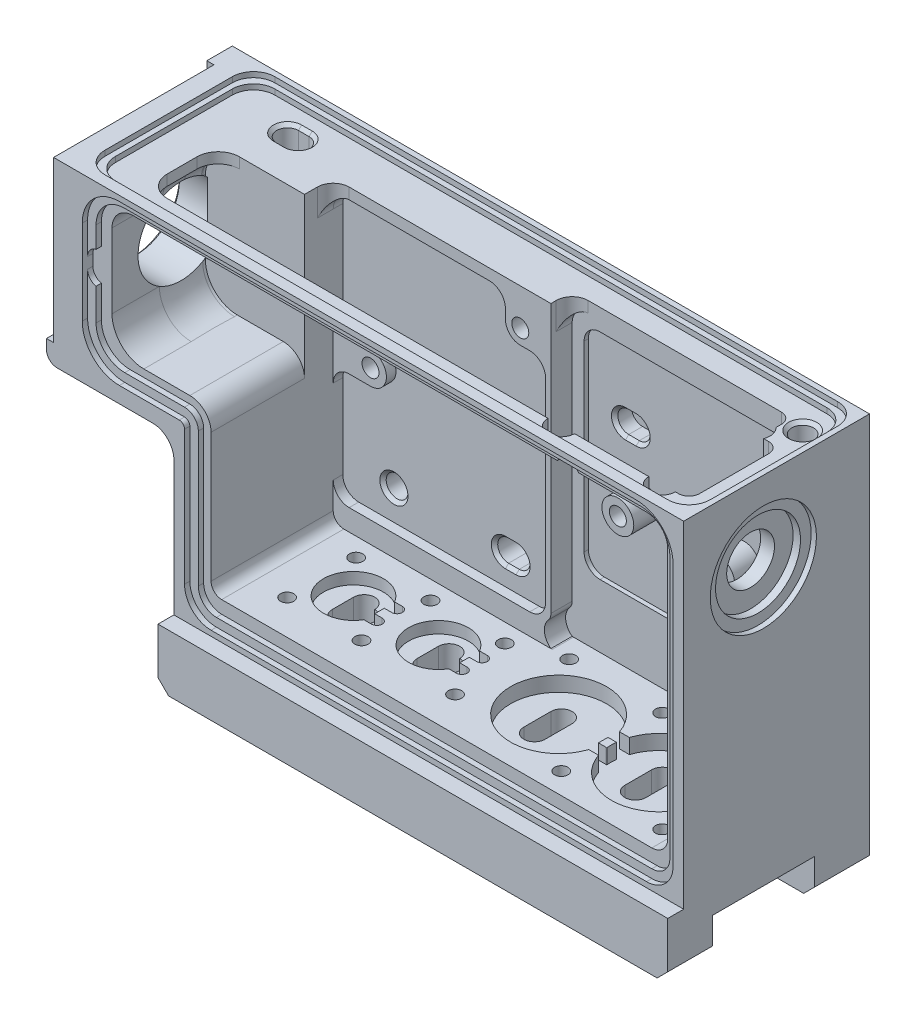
SolidWorks part; units mm, degrees
ref_plane "前视基准面" through (0, 0, 0) normal (0, 0, 1) x (1, 0, 0)
ref_plane "上视基准面" through (0, 0, 0) normal (0, 1, 0) x (1, 0, 0)
ref_plane "右视基准面" through (0, 0, 0) normal (1, 0, 0) x (0, 0, -1)
sketch "草图1" plane through (0, 0, 0) normal (0, 0, 1) x (1, 0, 0)
  line L1 (30, -17.5) -> (-30, -17.5)
  line L2 (30, -17.5) -> (30, 17.5)
  line L3 (30, 17.5) -> (-30, 17.5)
  line L4 (-30, -17.5) -> (-30, 17.5)
  line L5 (30, -17.5) -> (-30, 17.5) construction
  line L6 (30, 17.5) -> (-30, -17.5) construction
  point P0 (0, 0)
  dimension "D1" = 60
  dimension "D2" = 35
extrude "凸台-拉伸1" add sketch "草图1" along normal mid plane 20
sketch "草图2" plane through (-30, 0, 0) normal (-1, 0, 0) x (0, 0, 1)
  line L0 (10, 17.5) -> (-10, 17.5) construction
  line L1 (-6.25, 2.5) -> (6.25, 2.5)
  line L2 (-6.25, 2.5) -> (-6.25, 17.5)
  line L3 (-6.25, 17.5) -> (6.25, 17.5)
  line L4 (6.25, 2.5) -> (6.25, 17.5)
  line L5 (-6.25, 2.5) -> (6.25, 17.5) construction
  line L6 (-6.25, 17.5) -> (6.25, 2.5) construction
  circle A0 centre (0, 10) radius 5 construction
  dimension "D1" = 10
  dimension "D3" = 15
  dimension "D4" = 12.5
extrude "凸台-拉伸2" add sketch "草图2" along normal blind 6.13
sketch "草图3" plane through (0, -17.5, 0) normal (0, -1, 0) x (1, 0, 0)
  line L0 (-30, -10) -> (30, -10) construction
  line L1 (-37, 10) -> (37, 10)
  line L2 (-37, 10) -> (-37, -10)
  line L3 (-37, -10) -> (37, -10)
  line L4 (37, 10) -> (37, -10)
  line L5 (-30, 10) -> (30, 10) construction
  line L6 (30, 10) -> (30, -10) construction
  line L7 (-30, 10) -> (-30, -10) construction
  dimension "D1" = 7
  dimension "D2" = 7
extrude "凸台-拉伸3" add sketch "草图3" against normal blind 3
fillet "圆角2" radius 2 4 edges at (-37, -16, -10) (-37, -16, 10) (37, -16, 10) (37, -16, -10)
sketch "草图7" plane through (0, 17.5, 0) normal (0, 1, 0) x (1, 0, 0)
  line L0 (30, -10) -> (30, 10) construction
  line L1 (-27, 5) -> (26, 5)
  line L2 (-27, 5) -> (-27, -7)
  line L3 (-27, -7) -> (26, -7)
  line L4 (26, 5) -> (26, -7)
  line L5 (-30, -10) -> (-30, 10) construction
  line L6 (30, 10) -> (-30, 10) construction
  line L7 (30, -10) -> (-30, -10) construction
  dimension "D1" = 4
  dimension "D2" = 3
  dimension "D3" = 5
  dimension "D4" = 3
extrude "切除-拉伸3" cut sketch "草图7" against normal offset from surface (30 mm away) 5
sketch "草图8" plane through (0, -17.5, 0) normal (0, -1, 0) x (1, 0, 0)
  line L0 (-37, 8) -> (-37, -8) construction
  line L1 (-37, 4) -> (37, 4)
  line L2 (-37, 4) -> (-37, -4)
  line L3 (-37, -4) -> (37, -4)
  line L4 (37, 4) -> (37, -4)
  line L5 (37, -8) -> (37, 8) construction
  point P8 (37, 0)
  dimension "D1" = 8
extrude "切除-拉伸4" cut sketch "草图8" against normal blind 3
sketch "草图9" plane through (0, 0, 10) normal (0, 0, 1) x (1, 0, 0)
  line L0 (30, -14.5) -> (30, 17.5) construction
  line L1 (-27, 14.5) -> (26, 14.5)
  line L2 (-27, 14.5) -> (-27, -12.5)
  line L3 (-27, -12.5) -> (26, -12.5)
  line L4 (26, 14.5) -> (26, -12.5)
  line L5 (-30, 17.5) -> (-30, -14.5) construction
  line L6 (-35, -17.5) -> (35, -17.5) construction
  line L7 (30, 17.5) -> (-30, 17.5) construction
  dimension "D1" = 4
  dimension "D2" = 3
  dimension "D3" = 5
  dimension "D4" = 3
extrude "切除-拉伸5" cut sketch "草图9" against normal up to surface (15 mm away)
sketch "草图10" plane through (0, -14.5, 0) normal (0, -1, 0) x (1, 0, 0)
  line L4 (-30, 4) -> (-30, -4)
  line L5 (-30, -4) -> (30, -4)
  line L6 (30, -4) -> (30, 4)
  line L7 (30, 4) -> (-30, 4)
  line L8 (-30, 4) -> (-30, -4)
  line L9 (-30, -4) -> (30, -4)
  line L10 (30, -4) -> (30, 4)
  line L11 (30, 4) -> (-30, 4)
  dimension "D1" = 0
extrude "凸台-拉伸4" add sketch "草图10" along normal blind 1
sketch "草图12" plane through (0, -12.5, 0) normal (0, 1, 0) x (1, 0, 0)
  line L4 (-27, 5) -> (-27, -10)
  line L5 (-27, -10) -> (26, -10)
  line L6 (26, -10) -> (26, 5)
  line L7 (26, 5) -> (-27, 5)
  line L8 (-27, 5) -> (-27, -10)
  line L9 (-27, -10) -> (26, -10)
  line L10 (26, -10) -> (26, 5)
  line L11 (26, 5) -> (-27, 5)
  dimension "D1" = 0
extrude "凸台-拉伸5" add sketch "草图12" along normal blind 0.859
sketch "草图13" plane through (0, 0, 6.25) normal (0, 0, 1) x (1, 0, 0)
  line L4 (-30, 2.5) -> (-30, 17.5)
  line L5 (-30, 17.5) -> (-36.13, 17.5)
  line L6 (-36.13, 17.5) -> (-36.13, 2.5)
  line L7 (-36.13, 2.5) -> (-30, 2.5)
  line L8 (-30, 2.5) -> (-30, 17.5)
  line L9 (-30, 17.5) -> (-36.13, 17.5)
  line L10 (-36.13, 17.5) -> (-36.13, 2.5)
  line L11 (-36.13, 2.5) -> (-30, 2.5)
  dimension "D1" = 0
extrude "凸台-拉伸6" add sketch "草图13" along normal up to surface (3.75 mm away)
sketch "草图14" plane through (0, 0, 10) normal (0, 0, 1) x (1, 0, 0)
  line L0 (30, 17.5) -> (-36.13, 17.5) construction
  line L1 (26, 14.5) -> (-27, 14.5)
  line L2 (26, 14.5) -> (26, 17.5)
  line L3 (26, 17.5) -> (-27, 17.5)
  line L4 (-27, 14.5) -> (-27, 17.5)
  line L5 (-27, -11.641) -> (-27, 17.5) construction
extrude "切除-拉伸6" cut sketch "草图14" against normal blind 10
sketch "草图15" plane through (-36.13, 0, 0) normal (-1, 0, 0) x (0, 0, 1)
  circle A0 centre (0, 10) radius 4.05
  dimension "D1" = 8.1
sketch "草图16" plane through (0, 0, 10) normal (0, 0, 1) x (1, 0, 0)
  line L0 (-30.1546, 16) -> (-32.1086, 16) construction
  line L1 (-33.13, 16.5) -> (-13.13, 16.5)
  line L2 (-33.13, 16.5) -> (-33.13, 3.5)
  line L3 (-33.13, 3.5) -> (-13.13, 3.5)
  line L4 (-13.13, 16.5) -> (-13.13, 3.5)
  line L5 (-32.1086, 4) -> (-30.1546, 4) construction
  line L7 (-36.13, 17.5) -> (-36.13, 2.5) construction
  dimension "D1" = 0.5
  dimension "D2" = 0.5
  dimension "D3" = 3
  dimension "D4" = 20
extrude "切除-拉伸8" cut sketch "草图16" against normal blind 12
sketch "草图17" plane through (0, 2.5, 0) normal (0, -1, 0) x (1, 0, 0)
  line L4 (-30, -6.25) -> (-30, 10)
  line L5 (-30, 10) -> (-36.13, 10)
  line L6 (-36.13, 10) -> (-36.13, -6.25)
  line L7 (-36.13, -6.25) -> (-30, -6.25)
  line L8 (-30, -6.25) -> (-30, 10)
  line L9 (-30, 10) -> (-36.13, 10)
  line L10 (-36.13, 10) -> (-36.13, -6.25)
  line L11 (-36.13, -6.25) -> (-30, -6.25)
  dimension "D1" = 0
extrude "凸台-拉伸7" add sketch "草图17" along normal blind 2
sketch "草图18" plane through (0, 0, -6.25) normal (0, 0, -1) x (-1, 0, 0)
  line L4 (30, 17.5) -> (30, 0.5)
  line L5 (30, 0.5) -> (36.13, 0.5)
  line L6 (36.13, 0.5) -> (36.13, 17.5)
  line L7 (36.13, 17.5) -> (30, 17.5)
  line L8 (30, 17.5) -> (30, 0.5)
  line L9 (30, 0.5) -> (36.13, 0.5)
  line L10 (36.13, 0.5) -> (36.13, 17.5)
  line L11 (36.13, 17.5) -> (30, 17.5)
  dimension "D1" = 0
extrude "凸台-拉伸8" add sketch "草图18" along normal blind 0.1
sketch "草图19" plane through (0, -11.641, 0) normal (0, 1, 0) x (1, 0, 0)
  line L0 (0, 0) -> (31.0789, 0) construction
  line L1 (0, 0) -> (0, 17.0216) construction
  line L2 (17.9214, -0.45) -> (18.6214, -0.45)
  line L3 (17.9214, 0.45) -> (18.6214, 0.45)
  line L4 (18.0078, -1.45) -> (18.6214, -1.45)
  line L5 (18.0078, 1.45) -> (18.6214, 1.45)
  line L6 (17.9214, 0.45) -> (17.9214, -0.45)
  line L7 (18.9214, 4) -> (18.9214, 1.6839) construction
  line L8 (9.1214, -1.45) -> (9.435, -1.45)
  line L9 (9.1214, 1.45) -> (9.435, 1.45)
  line L23 (8.4214, -0.45) -> (9.1214, -0.45)
  line L24 (8.4214, 0.45) -> (9.1214, 0.45)
  line L25 (8.5078, -1.45) -> (9.1214, -1.45)
  line L26 (8.5078, 1.45) -> (9.1214, 1.45)
  line L27 (8.4214, 0.45) -> (8.4214, -0.45)
  line L28 (9.4214, 4) -> (9.4214, 1.6839) construction
  arc A0 (18.0078, 1.45) -> (9.435, 1.45) centre (13.7214, 0) ccw
  arc A1 (18.6214, 0.45) -> (18.6214, 1.45) centre (18.6214, 0.95) ccw
  arc A2 (8.5078, 1.45) -> (8.5078, -1.45) centre (4.2214, 0) ccw
  arc A3 (18.6214, -1.45) -> (18.6214, -0.45) centre (18.6214, -0.95) ccw
  arc A5 (9.2198, 0.4598) -> (9.2198, -0.4598) centre (13.7214, 0) ccw
  arc A6 (9.2198, -0.4598) -> (9.1214, -0.45) centre (9.1214, -0.95) ccw
  arc A7 (9.435, -1.45) -> (18.0078, -1.45) centre (13.7214, 0) ccw
  arc A8 (9.1214, 0.45) -> (9.2198, 0.4598) centre (9.1214, 0.95) ccw
  dimension "D2" = 4.2
  dimension "D3" = 0.9
  dimension "D4" = 2.9
  dimension "D5" = 0.5
  dimension "D6" = 2
  dimension "D7" = 1
  dimension "D11" = 4.9
  dimension "D8" = 0.45
extrude "切除-拉伸9" cut sketch "草图19" against normal blind 1.4
sketch "草图20" plane through (0, -15.5, 0) normal (0, -1, 0) x (1, 0, 0)
  line L0 (3.2214, 1.27) -> (3.2214, -1.27) construction
  line L1 (4.2214, 1.27) -> (4.2214, -1.27)
  line L2 (2.2214, 1.27) -> (2.2214, -1.27)
  line L3 (12.7214, 1.27) -> (12.7214, -1.27) construction
  line L4 (13.7214, 1.27) -> (13.7214, -1.27)
  line L5 (11.7214, 1.27) -> (11.7214, -1.27)
  arc A0 (4.2214, 1.27) -> (2.2214, 1.27) centre (3.2214, 1.27) ccw
  arc A1 (2.2214, -1.27) -> (4.2214, -1.27) centre (3.2214, -1.27) ccw
  arc A2 (13.7214, 1.27) -> (11.7214, 1.27) centre (12.7214, 1.27) ccw
  arc A3 (11.7214, -1.27) -> (13.7214, -1.27) centre (12.7214, -1.27) ccw
  point P2 (3.2214, 0)
  point P7 (12.7214, 0)
  dimension "D1" = 1
  dimension "D2" = 1
extrude "切除-拉伸10" cut sketch "草图20" against normal through all
sketch "草图21" plane through (0, 0, -5) normal (0, 0, 1) x (1, 0, 0)
  line L0 (-6.6849, -6.841) -> (-5.6849, -6.841) construction
  line L1 (-6.6849, -5.816) -> (-5.6849, -5.816)
  line L2 (-6.6849, -7.866) -> (-5.6849, -7.866)
  circle A0 centre (-17.1849, -6.841) radius 1.025
  arc A1 (-6.6849, -5.816) -> (-6.6849, -7.866) centre (-6.6849, -6.841) ccw
  arc A2 (-5.6849, -7.866) -> (-5.6849, -5.816) centre (-5.6849, -6.841) ccw
  point P4 (-6.1849, -6.841)
  dimension "D1" = 2.05
  dimension "D2" = 1.025
  dimension "D3" = 1
extrude "切除-拉伸11" cut sketch "草图21" against normal blind 3
chamfer "倒角1" distance 0.3 angle 45 1 edges at (-16.1599, -6.841, -5)
sketch "草图26" plane through (0, -11.641, 0) normal (0, 1, 0) x (1, 0, 0)
  line L0 (-12.64, 0) -> (-13.022, 0) construction
  line L1 (-15.09, 0) -> (-15.09, -4.6577) construction
  line L2 (-12.64, 0.45) -> (-11.94, 0.45)
  line L3 (-12.64, -0.45) -> (-11.94, -0.45)
  line L4 (-12.64, 2.2775) -> (-12.64, 1.45) construction
  line L6 (-12.6655, 1.45) -> (-11.94, 1.45)
  line L7 (-12.6655, -1.45) -> (-11.94, -1.45)
  line L8 (-15.6464, 1.45) -> (-12.5735, 1.45) construction
  line L9 (-15.6464, 0.45) -> (-12.5735, 0.45) construction
  line L10 (-15.6464, -1.45) -> (-12.6301, -1.45) construction
  line L11 (-15.6464, -0.45) -> (-12.6301, -0.45) construction
  line L12 (-12.64, 0.45) -> (-12.64, -0.45)
  line L13 (-4.64, 0.45) -> (-3.94, 0.45)
  line L14 (-4.64, -0.45) -> (-3.94, -0.45)
  line L15 (-4.6655, 1.45) -> (-3.94, 1.45)
  line L16 (-4.6655, -1.45) -> (-3.94, -1.45)
  line L17 (-4.64, 0.45) -> (-4.64, -0.45)
  line L18 (-4.64, 2.2775) -> (-4.64, 1.45) construction
  line L19 (-27, 5) -> (-27, -10) construction
  arc A0 (-3.94, 0.45) -> (-3.94, 1.45) centre (-3.94, 0.95) ccw
  arc A1 (-11.94, 0.45) -> (-11.94, 1.45) centre (-11.94, 0.95) ccw
  arc A2 (-11.94, -1.45) -> (-11.94, -0.45) centre (-11.94, -0.95) ccw
  arc A3 (-12.6655, 1.45) -> (-12.6655, -1.45) centre (-15.09, 0) ccw
  arc A4 (-3.94, -1.45) -> (-3.94, -0.45) centre (-3.94, -0.95) ccw
  arc A5 (-4.6655, 1.45) -> (-4.6655, -1.45) centre (-7.09, 0) ccw
  dimension "D8" = 1
  dimension "D9" = 0.7
  dimension "D10" = 2.825
  dimension "D11" = 0.7
  dimension "D12" = 8
  dimension "D13" = 11.91
  dimension "D2" = 0.45
  dimension "D3" = 0.45
  dimension "D4" = 2
  dimension "D5" = 2.45
  dimension "D6" = 1
  dimension "D7" = 1
extrude "切除-拉伸12" cut sketch "草图26" against normal blind 1.1
sketch "草图27" plane through (0, 0, -5) normal (0, 0, 1) x (1, 0, 0)
  line L0 (-22, -3.2895) -> (-22, 15.459)
  line L1 (-22, 15.459) -> (-2, 15.459)
  line L2 (-2, 15.459) -> (-2, -9.641)
  line L4 (-22, -3.2895) -> (-22, -9.641)
  line L5 (-22, -9.641) -> (-2, -9.641)
  line L8 (-27, -11.641) -> (26, -11.641) construction
  line L9 (-27, -11.641) -> (-27, 17.5) construction
  dimension "D1" = 5
  dimension "D2" = 2
  dimension "D3" = 25.1
extrude "切除-拉伸13" cut sketch "草图27" against normal blind 1
fillet "圆角4" radius 1.5 4 edges at (-22, -9.641, -5.5) (-22, 15.459, -5.5) (-2, 15.459, -5.5) (-2, -9.641, -5.5)
sketch "草图30" plane through (0, 17.5, 0) normal (0, 1, 0) x (1, 0, 0)
  line L10 (-30, 10) -> (-30, 6.35)
  line L11 (-30, 6.35) -> (-36.13, 6.35)
  line L12 (-36.13, 6.35) -> (-36.13, -10)
  line L13 (-36.13, -10) -> (-27, -10)
  line L14 (-27, -10) -> (-27, 5)
  line L15 (-27, 5) -> (26, 5)
  line L16 (26, 5) -> (26, -10)
  line L17 (26, -10) -> (30, -10)
  line L18 (30, -10) -> (30, 10)
  line L19 (30, 10) -> (-30, 10)
  line L20 (-30, 10) -> (-30, 6.35)
  line L21 (-30, 6.35) -> (-36.13, 6.35)
  line L22 (-36.13, 6.35) -> (-36.13, -10)
  line L23 (-36.13, -10) -> (-27, -10)
  line L24 (-27, -10) -> (-27, 5)
  line L25 (-27, 5) -> (26, 5)
  line L26 (26, 5) -> (26, -10)
  line L27 (26, -10) -> (30, -10)
  line L28 (30, -10) -> (30, 10)
  line L29 (30, 10) -> (-30, 10)
  dimension "D1" = 0
extrude "凸台-拉伸9" add sketch "草图30" along normal blind 2
sketch "草图37" plane through (0, 0, -4.7) normal (0, 0, 1) x (1, 0, 0)
  line L0 (-27, -11.641) -> (26, -11.641) construction
  line L1 (1, 6.359) -> (25.5, 6.359)
  line L2 (1, 6.359) -> (1, 1.359)
  line L3 (1, 1.359) -> (25.5, 1.359)
  line L4 (25.5, 6.359) -> (25.5, 1.359)
  line L5 (26, -11.641) -> (26, 19.5) construction
  dimension "D1" = 13
  dimension "D2" = 25
  dimension "D3" = 5
  dimension "D4" = 0.5
extrude "切除-拉伸19" cut sketch "草图37" against normal blind 0.6
fillet "圆角8" radius 0.5 4 edges at (1, 1.359, -5.15) (1, 6.359, -5.15) (25.5, 6.359, -5.15) (25.5, 1.359, -5.15)
sketch "草图38" plane through (0, 0, -5) normal (0, 0, 1) x (1, 0, 0)
  circle A0 centre (2.9714, -2.7415) radius 1.025
  circle A1 centre (20.9714, -2.7415) radius 1.025
  dimension "D1" = 2.05
  dimension "D2" = 2.05
extrude "切除-拉伸20" cut sketch "草图38" against normal blind 2
chamfer "倒角2" distance 0.3 angle 45 2 edges at (21.9964, -2.7415, -5) (3.9964, -2.7415, -5)
sketch "草图44" plane through (0, 0, -5) normal (0, 0, 1) x (1, 0, 0)
  line L4 (0.5371, 16.1945) -> (-0.2406, 15.4167) construction
  line L5 (-0.2406, 15.4167) -> (8.2443, 6.9314) construction
  line L6 (8.2443, 6.9314) -> (9.0221, 7.7092) construction
  line L7 (9.0221, 7.7092) -> (0.5371, 16.1945) construction
  line L12 (0.0068, 16.6541) -> (-0.7003, 15.947)
  line L13 (-0.7003, 14.8864) -> (7.714, 6.4718)
  line L14 (8.7747, 6.4718) -> (9.4817, 7.1789)
  line L15 (9.4817, 8.2396) -> (1.0675, 16.6541)
  line L16 (0.5371, 17.1845) -> (-1.2306, 15.4167) construction
  line L17 (10.012, 7.7092) -> (0.5371, 17.1845) construction
  line L18 (8.2443, 5.9414) -> (10.012, 7.7092) construction
  line L19 (-1.2306, 15.4167) -> (8.2443, 5.9414) construction
  line L24 (13.8868, 16.6541) -> (13.1797, 15.947)
  line L25 (13.1797, 14.8864) -> (21.594, 6.4718)
  line L26 (23.3617, 8.2396) -> (14.9475, 16.6541)
  line L27 (14.4171, 16.1945) -> (13.6394, 15.4167) construction
  line L28 (13.6394, 15.4167) -> (22.1243, 6.9314) construction
  line L29 (22.9021, 7.7092) -> (14.4171, 16.1945) construction
  line L30 (22.6547, 6.4718) -> (23.3617, 7.1789)
  arc A0 (0.0068, 16.6541) -> (1.0675, 16.6541) centre (0.5371, 16.1238) cw
  arc A1 (9.4817, 7.1789) -> (9.4817, 8.2396) centre (8.9514, 7.7092) ccw
  arc A2 (8.7747, 6.4718) -> (7.714, 6.4718) centre (8.2443, 7.0021) cw
  arc A3 (-0.7003, 14.8864) -> (-0.7003, 15.947) centre (-0.1699, 15.4167) cw
  arc A8 (13.8868, 16.6541) -> (14.9475, 16.6541) centre (14.4171, 16.1238) cw
  arc A9 (13.1797, 14.8864) -> (13.1797, 15.947) centre (13.7101, 15.4167) cw
  arc A10 (22.6547, 6.4718) -> (21.594, 6.4718) centre (22.1243, 7.0021) cw
  arc A11 (23.3617, 7.1789) -> (23.3617, 8.2396) centre (22.8314, 7.7092) ccw
  dimension "D2" = 0.75
  dimension "D3" = 2
extrude "切除-拉伸22" cut sketch "草图44" against normal blind 1
sketch "草图48" plane through (0, 19.5, 0) normal (0, 1, 0) x (1, 0, 0)
  line L0 (25, -10) -> (27.8, -10) construction
  line L1 (-27, 5) -> (26, 5) construction
  line L2 (-27, 5) -> (-27, -10) construction
  line L3 (-27, -10) -> (26, -10) construction
  line L4 (26, 5) -> (26, -10) construction
  line L5 (-28.8, 6.8) -> (27.8, 6.8)
  line L6 (27.8, 6.8) -> (27.8, -11.8)
  line L7 (-28.8, -11.8) -> (27.8, -11.8)
  line L8 (-28.8, 6.8) -> (-28.8, -11.8)
  dimension "D1" = 1.8
extrude "切除-拉伸26" cut sketch "草图48" against normal blind 0.5
fillet "圆角10" radius 2 2 edges at (27.8, 19.25, -6.8) (-28.8, 19.25, -6.8)
extrude "切除-拉伸28" cut sketch "草图15" against normal blind 3
sketch "草图51" plane through (-36.13, 0, 0) normal (-1, 0, 0) x (0, 0, 1)
  line L0 (-6.35, 0.5) -> (-6.35, 19.5) construction
  line L1 (7.65, 16.5) -> (-6.35, 16.5)
  line L2 (7.65, 16.5) -> (7.65, 3.5)
  line L3 (7.65, 3.5) -> (-6.35, 3.5)
  line L4 (-6.35, 16.5) -> (-6.35, 3.5)
  line L5 (6.35, 16.5) -> (-6.35, 3.5) construction
  line L6 (6.35, 3.5) -> (-6.35, 16.5) construction
  line L8 (7.5, 14.35) -> (7.5, 5.65) construction
  point P0 (0, 10)
  dimension "D1" = 13
  dimension "D2" = 0.15
extrude "切除-拉伸29" cut sketch "草图51" against normal blind 0.3
fillet "圆角11" radius 2 2 edges at (-35.98, 16.5, 7.65) (-35.98, 3.5, 7.65)
chamfer "倒角4" distance 0.3 angle 45 1 edges at (-35.83, 10, -4.05)
sketch "草图57" plane through (0, -14.5, 0) normal (0, 1, 0) x (1, 0, 0)
  line L0 (37, -4) -> (37, -8) construction
  line L1 (37, 8) -> (37, 4) construction
  line L2 (30, 4) -> (37, 4) construction
  line L3 (37, -4) -> (30, -4) construction
  line L4 (-35, 10) -> (-30, 10) construction
  line L5 (-37, 4) -> (-37, 8) construction
  line L6 (-35, -10) -> (35, -10) construction
  line L7 (-37, -8) -> (-37, -4) construction
  circle A0 centre (-33.5, 7) radius 1.4
  circle A1 centre (33.5, 7) radius 1.4
  circle A2 centre (33.5, -7) radius 1.4
  circle A3 centre (-33.5, -7) radius 1.4
  dimension "D1" = 3.5
  dimension "D2" = 3.5
  dimension "D3" = 3
  dimension "D4" = 3
  dimension "D5" = 3
  dimension "D6" = 3.5
  dimension "D7" = 2.8
  dimension "D8" = 2.8
  dimension "D9" = 3
  dimension "D10" = 3.5
extrude "切除-拉伸32" cut sketch "草图57" against normal through all
fillet "圆角14" radius 1 1 edges at (-36.13, 19.5, 1.825)
sketch "草图61" plane through (0, 0, -6.35) normal (0, 0, -1) x (-1, 0, 0)
  line L8 (30, 19.5) -> (30, 0.5)
  line L9 (30, 0.5) -> (36.13, 0.5)
  line L10 (36.13, 0.5) -> (36.13, 3.5)
  line L11 (36.13, 3.5) -> (35.83, 3.5)
  line L12 (35.83, 3.5) -> (35.83, 16.5)
  line L13 (35.83, 16.5) -> (36.13, 16.5)
  line L14 (36.13, 16.5) -> (36.13, 18.5)
  line L15 (35.13, 19.5) -> (30, 19.5)
  line L16 (30, 19.5) -> (30, 0.5)
  line L17 (30, 0.5) -> (36.13, 0.5)
  line L18 (36.13, 0.5) -> (36.13, 3.5)
  line L19 (36.13, 3.5) -> (35.83, 3.5)
  line L20 (35.83, 3.5) -> (35.83, 16.5)
  line L21 (35.83, 16.5) -> (36.13, 16.5)
  line L22 (36.13, 16.5) -> (36.13, 18.5)
  line L23 (35.13, 19.5) -> (30, 19.5)
  arc A5 (36.13, 18.5) -> (35.13, 19.5) centre (35.13, 18.5) ccw
  arc A8 (36.13, 18.5) -> (35.13, 19.5) centre (35.13, 18.5) ccw
  dimension "D1" = 0
extrude "凸台-拉伸13" add sketch "草图61" along normal up to surface (3.65 mm away)
sketch "草图62" plane through (0, -14.5, 0) normal (0, 1, 0) x (1, 0, 0)
  line L4 (-37, 8) -> (-37, 4)
  line L5 (-37, 4) -> (-30, 4)
  line L6 (-30, 4) -> (-30, 10)
  line L7 (-30, 10) -> (-35, 10)
  line L8 (-37, 8) -> (-37, 4)
  line L9 (-37, 4) -> (-30, 4)
  line L10 (-30, 4) -> (-30, 10)
  line L11 (-30, 10) -> (-35, 10)
  arc A1 (-35, 10) -> (-37, 8) centre (-35, 8) ccw
  arc A2 (-35, 10) -> (-37, 8) centre (-35, 8) ccw
  dimension "D1" = 0
extrude "切除-拉伸37" cut sketch "草图62" against normal through all
sketch "草图63" plane through (-35.83, 0, 0) normal (-1, 0, 0) x (0, 0, 1)
  line L0 (-10, 3.5) -> (5.65, 3.5) construction
  line L1 (-10, 16.5) -> (-7.6, 16.5)
  line L2 (-10, 16.5) -> (-10, 3.5)
  line L3 (-10, 3.5) -> (-7.6, 3.5)
  line L4 (-7.6, 16.5) -> (-7.6, 3.5)
  line L5 (-7.5, 5.65) -> (-7.5, 14.35) construction
  dimension "D1" = 0.1
extrude "凸台-拉伸14" add sketch "草图63" along normal up to surface (0.3 mm away)
hole_wizard "M5 螺纹孔1" positions "草图69" profile "草图70" tap size "M5" standard "GB"
sketch "草图69" plane through (30, 0, 0) normal (1, 0, 0) x (0, 0, -1)
  point P0 (0, 10)
sketch "草图70" plane through (30, 10, 0) normal (0, 1, 0) x (0, 0, -1)
  line L0 (0, 0) -> (0, 13.6618)
  line L1 (0, 13.6618) -> (2.1, 12.4)
  line L2 (2.1, 12.4) -> (2.1, 0)
  line L5 (2.1, 0) -> (0, 0)
  line L10 (0, 13.6618) -> (-2.1, 12.4) construction
  line L11 (0, -6.35) -> (0, 107.95) construction
  dimension "螺纹孔钻头直径" = 4.2
  dimension "螺纹孔钻头深度" = 12.4
  dimension "导头角度" = 118
sketch "草图71" plane through (0, -17.5, 0) normal (0, -1, 0) x (1, 0, 0)
  line L4 (-37, 4) -> (37, 4)
  line L5 (37, 4) -> (37, 8)
  line L6 (35, 10) -> (-35, 10)
  line L7 (-37, 8) -> (-37, 4)
  line L8 (-37, 4) -> (37, 4)
  line L9 (37, 4) -> (37, 8)
  line L10 (35, 10) -> (-35, 10)
  line L11 (-37, 8) -> (-37, 4)
  line L12 (37, -8) -> (37, -4)
  line L13 (37, -4) -> (-30, -4)
  line L14 (-30, -4) -> (-30, -10)
  line L15 (-30, -10) -> (35, -10)
  line L16 (37, -8) -> (37, -4)
  line L17 (37, -4) -> (-30, -4)
  line L18 (-30, -4) -> (-30, -10)
  line L19 (-30, -10) -> (35, -10)
  circle A0 centre (33.5, -7) radius 1.4 construction
  circle A1 centre (33.5, 7) radius 1.4 construction
  arc A3 (35, -10) -> (37, -8) centre (35, -8) ccw
  arc A5 (37, 8) -> (35, 10) centre (35, 8) ccw
  arc A6 (-35, 10) -> (-37, 8) centre (-35, 8) ccw
  arc A9 (37, 8) -> (35, 10) centre (35, 8) ccw
  arc A10 (-35, 10) -> (-37, 8) centre (-35, 8) ccw
  arc A13 (35, -10) -> (37, -8) centre (35, -8) ccw
  circle A14 centre (-33.5, 7) radius 1.4 construction
  circle A15 centre (33.5, -7) radius 1.4
  circle A16 centre (33.5, 7) radius 1.4
  circle A17 centre (-33.5, 7) radius 1.4
  dimension "D1" = 0
  dimension "D2" = 0
extrude "凸台-拉伸15" add sketch "草图71" along normal blind 2
sketch "草图72" plane through (0, 19.5, 0) normal (0, 1, 0) x (1, 0, 0)
  line L0 (30, -10) -> (30, 10) construction
  line L1 (-44.9618, 13.8028) -> (30, 13.8028)
  line L2 (-44.9618, 13.8028) -> (-44.9618, -14.3062)
  line L3 (-44.9618, -14.3062) -> (30, -14.3062)
  line L4 (30, 13.8028) -> (30, -14.3062)
extrude "切除-拉伸38" cut sketch "草图72" against normal blind 2.5
sketch "草图73" plane through (0, 17, 0) normal (0, 1, 0) x (1, 0, 0)
  line L0 (-36.13, 10) -> (-36.13, -10) construction
  line L1 (-27, -10) -> (-33.13, -10)
  line L2 (-27, -10) -> (-27, 2)
  line L3 (-27, 2) -> (-33.13, 2)
  line L4 (-33.13, -10) -> (-33.13, 2)
  line L5 (30, 10) -> (-36.13, 10) construction
  line L6 (-27, -10) -> (-36.13, -10) construction
  dimension "D1" = 3
  dimension "D2" = 8
extrude "切除-拉伸39" cut sketch "草图73" against normal blind 10
sketch "草图75" plane through (0, 0, 10) normal (0, 0, 1) x (1, 0, 0)
  line L0 (35, -14.5) -> (30, -14.5) construction
  line L1 (-36.13, 17) -> (33.0253, 17)
  line L2 (-36.13, 17) -> (-36.13, -14.5)
  line L3 (-36.13, -14.5) -> (33.0253, -14.5)
  line L4 (33.0253, 17) -> (33.0253, -14.5)
extrude "切除-拉伸41" cut sketch "草图75" against normal blind 1
sketch "草图76" plane through (0, -14.5, 0) normal (0, 1, 0) x (1, 0, 0)
  line L4 (30, 4) -> (37, 4)
  line L5 (37, 4) -> (37, 8)
  line L6 (35, 10) -> (30, 10)
  line L7 (30, 10) -> (30, 4)
  line L8 (-35, -10) -> (35, -10)
  line L9 (37, -8) -> (37, -4)
  line L10 (37, -4) -> (30, -4)
  line L11 (30, -4) -> (30, -9)
  line L12 (30, -9) -> (-30, -9)
  line L13 (-30, -9) -> (-30, -4)
  line L14 (-30, -4) -> (-37, -4)
  line L15 (-37, -4) -> (-37, -8)
  line L16 (-35, -10) -> (35, -10)
  line L17 (37, -8) -> (37, -4)
  line L18 (37, -4) -> (30, -4)
  line L19 (30, -4) -> (30, -9)
  line L20 (30, -9) -> (-30, -9)
  line L21 (-30, -9) -> (-30, -4)
  line L22 (-30, -4) -> (-37, -4)
  line L23 (-37, -4) -> (-37, -8)
  line L24 (30, 4) -> (37, 4)
  line L25 (37, 4) -> (37, 8)
  line L26 (35, 10) -> (30, 10)
  line L27 (30, 10) -> (30, 4)
  circle A0 centre (33.5, -7) radius 1.4 construction
  circle A1 centre (33.5, 7) radius 1.4 construction
  arc A3 (37, 8) -> (35, 10) centre (35, 8) ccw
  arc A4 (35, -10) -> (37, -8) centre (35, -8) ccw
  arc A7 (-37, -8) -> (-35, -10) centre (-35, -8) ccw
  arc A8 (35, -10) -> (37, -8) centre (35, -8) ccw
  arc A11 (-37, -8) -> (-35, -10) centre (-35, -8) ccw
  arc A13 (37, 8) -> (35, 10) centre (35, 8) ccw
  circle A14 centre (-33.5, -7) radius 1.4 construction
  circle A15 centre (33.5, -7) radius 1.4
  circle A16 centre (33.5, 7) radius 1.4
  circle A17 centre (-33.5, -7) radius 1.4
  dimension "D1" = 0
  dimension "D2" = 0
extrude "切除-拉伸42" cut sketch "草图76" against normal through all
sketch "草图78" plane through (0, 17, 0) normal (0, 1, 0) x (1, 0, 0)
  line L0 (-36.13, -9) -> (-36.13, 10)
  line L1 (-36.13, 10) -> (30, 10)
  line L2 (30, 10) -> (30, -9)
  line L3 (-35.13, -9) -> (-35.13, 9)
  line L4 (-35.13, 9) -> (29, 9)
  line L5 (29, 9) -> (29, -9)
  line L6 (-36.13, -9) -> (-35.13, -9)
  line L7 (29, -9) -> (30, -9)
  dimension "D1" = 1
extrude "凸台-拉伸16" add sketch "草图78" along normal blind 1
sketch "草图79" plane through (-33.13, 0, 0) normal (1, 0, 0) x (0, 0, -1)
  line L5 (-9, 17) -> (-9, 3.5)
  line L6 (-9, 3.5) -> (2, 3.5)
  line L7 (2, 3.5) -> (2, 6.4783)
  line L8 (2, 13.5217) -> (2, 17)
  line L9 (2, 17) -> (-9, 17)
  line L10 (-9, 17) -> (-9, 3.5)
  line L11 (-9, 3.5) -> (2, 3.5)
  line L12 (2, 3.5) -> (2, 6.4783)
  line L13 (2, 13.5217) -> (2, 17)
  line L14 (2, 17) -> (-9, 17)
  arc A1 (2, 13.5217) -> (2, 6.4783) centre (0, 10) ccw
  arc A2 (2, 13.5217) -> (2, 6.4783) centre (0, 10) ccw
  dimension "D1" = 0
extrude "凸台-拉伸17" add sketch "草图79" along normal blind 3
sketch "草图91" plane through (0, 0, -5) normal (0, 0, 1) x (1, 0, 0)
  line L0 (-1.5, -11.641) -> (-1.5, -9.141)
  line L1 (-1.5, -9.141) -> (26, -9.141)
  line L3 (-2, -8.141) -> (-2, 13.959) construction
  line L13 (26, 17) -> (-27, 17)
  line L14 (-27, 17) -> (-27, -11.641)
  line L15 (-27, -11.641) -> (26, -11.641)
  line L16 (26, -11.641) -> (26, 17)
  line L28 (-1.5, -11.641) -> (26, -11.641)
  line L29 (26, -11.641) -> (26, -9.141)
  dimension "D2" = 0.5
  dimension "D1" = 0
extrude "切除-拉伸46" cut sketch "草图91" against normal blind 2
sketch "草图102" plane through (0, 0, -7) normal (0, 0, 1) x (1, 0, 0)
  line L0 (-35.13, 17) -> (29, 17) construction
  line L1 (-1.5, -9.141) -> (26, -9.141)
  line L2 (-1.5, -9.141) -> (-1.5, 17)
  line L3 (-1.5, 17) -> (26, 17)
  line L4 (26, -9.141) -> (26, 17)
  line L5 (26, -11.641) -> (26, -9.141) construction
extrude "切除-拉伸53" cut sketch "草图102" along normal up to surface (2 mm away)
sketch "草图113" plane through (-27, 0, 0) normal (1, 0, 0) x (0, 0, -1)
  line L6 (-9, 3.5) -> (-9, -11.641)
  line L7 (-9, -11.641) -> (5, -11.641)
  line L8 (5, -11.641) -> (5, 17)
  line L9 (5, 17) -> (2, 17)
  line L10 (2, 17) -> (2, 3.5)
  line L11 (2, 3.5) -> (-9, 3.5)
  line L12 (-9, 3.5) -> (-9, -11.641)
  line L13 (-9, -11.641) -> (5, -11.641)
  line L14 (5, -11.641) -> (5, 17)
  line L15 (5, 17) -> (2, 17)
  line L16 (2, 17) -> (2, 3.5)
  line L17 (2, 3.5) -> (-9, 3.5)
  dimension "D1" = 0
extrude "凸台-拉伸18" add sketch "草图113" along normal blind 3.5
sketch "草图114" plane through (-30, 0, 0) normal (-1, 0, 0) x (0, 0, 1)
  line L8 (-4, -19.5) -> (-4, -15.5)
  line L9 (-4, -15.5) -> (4, -15.5)
  line L10 (4, -15.5) -> (4, -19.5)
  line L11 (4, -19.5) -> (9, -19.5)
  line L12 (9, -19.5) -> (9, 0.5)
  line L13 (9, 0.5) -> (-10, 0.5)
  line L14 (-10, 0.5) -> (-10, -19.5)
  line L15 (-10, -19.5) -> (-4, -19.5)
  line L16 (-4, -19.5) -> (-4, -15.5)
  line L17 (-4, -15.5) -> (4, -15.5)
  line L18 (4, -15.5) -> (4, -19.5)
  line L19 (4, -19.5) -> (9, -19.5)
  line L20 (9, -19.5) -> (9, 0.5)
  line L21 (9, 0.5) -> (-10, 0.5)
  line L22 (-10, 0.5) -> (-10, -19.5)
  line L23 (-10, -19.5) -> (-4, -19.5)
  dimension "D1" = 0
extrude "切除-拉伸62" cut sketch "草图114" against normal blind 3.5
sketch "草图115" plane through (26, 0, 0) normal (-1, 0, 0) x (0, 0, 1)
  line L4 (9, -11.641) -> (9, 17)
  line L5 (9, 17) -> (-7, 17)
  line L6 (-7, 17) -> (-7, -11.641)
  line L7 (-7, -11.641) -> (9, -11.641)
  line L8 (9, -11.641) -> (9, 17)
  line L9 (9, 17) -> (-7, 17)
  line L10 (-7, 17) -> (-7, -11.641)
  line L11 (-7, -11.641) -> (9, -11.641)
  dimension "D1" = 0
extrude "凸台-拉伸19" add sketch "草图115" along normal blind 5.5
sketch "草图116" plane through (30, 0, 0) normal (1, 0, 0) x (0, 0, -1)
  line L8 (10, 18) -> (-9, 18)
  line L9 (-9, 18) -> (-9, -19.5)
  line L10 (-9, -19.5) -> (-4, -19.5)
  line L11 (-4, -19.5) -> (-4, -15.5)
  line L12 (-4, -15.5) -> (4, -15.5)
  line L13 (4, -15.5) -> (4, -19.5)
  line L14 (4, -19.5) -> (10, -19.5)
  line L15 (10, -19.5) -> (10, 18)
  line L16 (10, 18) -> (-9, 18)
  line L17 (-9, 18) -> (-9, -19.5)
  line L18 (-9, -19.5) -> (-4, -19.5)
  line L19 (-4, -19.5) -> (-4, -15.5)
  line L20 (-4, -15.5) -> (4, -15.5)
  line L21 (4, -15.5) -> (4, -19.5)
  line L22 (4, -19.5) -> (10, -19.5)
  line L23 (10, -19.5) -> (10, 18)
  dimension "D1" = 0
extrude "切除-拉伸63" cut sketch "草图116" against normal blind 6.5
sketch "草图117" plane through (0, 18, 0) normal (0, 1, 0) x (1, 0, 0)
  line L6 (-35.13, 9) -> (23.5, 9)
  line L7 (23.5, 9) -> (23.5, 10)
  line L8 (23.5, 10) -> (-36.13, 10)
  line L9 (-36.13, 10) -> (-36.13, -9)
  line L10 (-36.13, -9) -> (-35.13, -9)
  line L11 (-35.13, -9) -> (-35.13, 9)
  line L12 (-35.13, 9) -> (23.5, 9)
  line L13 (23.5, 9) -> (23.5, 10)
  line L14 (23.5, 10) -> (-36.13, 10)
  line L15 (-36.13, 10) -> (-36.13, -9)
  line L16 (-36.13, -9) -> (-35.13, -9)
  line L17 (-35.13, -9) -> (-35.13, 9)
  dimension "D1" = 0
extrude "切除-拉伸64" cut sketch "草图117" against normal blind 0.5
fillet "圆角35" [suppressed] radius 0.5
hole_wizard "M2.5 螺纹孔1" positions "草图121" profile "草图122" tap size "M2.5" standard "GB"
sketch "草图121" plane through (0, -19.5, 0) normal (0, -1, 0) x (-1, 0, 0)
  line L1 (26.5, -9) -> (26.5, 10) construction
  line L4 (26.5, 4) -> (-23.5, 4) construction
  line L6 (26.5, -4) -> (-23.5, -4) construction
  line L7 (-23.5, -4) -> (26.5, -4) construction
  line L8 (-23.5, 4) -> (26.5, 4) construction
  line L9 (-23.5, -9) -> (-23.5, -4) construction
  line L10 (-23.5, 4) -> (-23.5, 10) construction
  point P0 (18.5, -6.5)
  point P2 (18.5, 6.5)
  point P4 (-21, -6.5)
  point P6 (-21, 6.5)
  dimension "D1" = 8
  dimension "D2" = 8
  dimension "D3" = 2.5
  dimension "D4" = 2.5
  dimension "D5" = 2.5
  dimension "D6" = 2.5
  dimension "D7" = 2.5
  dimension "D8" = 2.5
sketch "草图122" plane through (-18.5, -19.5, 6.5) normal (1, 0, 0) x (0, 0, -1)
  line L0 (0, 0) -> (0, 5.1159)
  line L1 (0, 5.1159) -> (1.025, 4.5)
  line L2 (1.025, 4.5) -> (1.025, 0)
  line L5 (1.025, 0) -> (0, 0)
  line L10 (0, 5.1159) -> (-1.025, 4.5) construction
  line L11 (0, -6.35) -> (0, 107.95) construction
  dimension "螺纹孔钻头直径" = 2.05
  dimension "螺纹孔钻头深度" = 4.5
  dimension "导头角度" = 118
sketch "草图125" plane through (20.5, 0, 0) normal (-1, 0, 0) x (0, 0, 1)
  line L7 (9, 17) -> (-7, 17)
  line L10 (-7, 17) -> (-7, -11.641)
  line L11 (-7, -11.641) -> (9, -11.641)
  line L12 (9, -11.641) -> (9, 17)
  line L13 (9, 17) -> (-7, 17)
  line L18 (-7, 17) -> (-7, -11.641)
  line L19 (-7, -11.641) -> (9, -11.641)
  line L20 (9, -11.641) -> (9, 17)
  dimension "D1" = 0
extrude "切除-拉伸66" cut sketch "草图125" against normal blind 0.5
sketch "草图126" plane through (0, 17, 0) normal (0, 1, 0) x (1, 0, 0)
  line L12 (-1.5, 5) -> (-1.5, 7)
  line L13 (-1.5, 5) -> (-1.5, 7)
  line L14 (21, 7) -> (21, -9)
  line L15 (21, -9) -> (23.5, -9)
  line L16 (23.5, -9) -> (23.5, 9)
  line L17 (23.5, 9) -> (-35.13, 9)
  line L18 (-35.13, 9) -> (-35.13, -9)
  line L19 (21, -9) -> (23.5, -9)
  line L20 (-35.13, -9) -> (-30.13, -9)
  line L21 (-30.13, 2) -> (-23.5, 2)
  line L22 (-23.5, 2) -> (-23.5, 5)
  line L23 (-23.5, 5) -> (-1.5, 5)
  line L24 (-35.13, -9) -> (-30.13, -9)
  line L25 (-30.13, -9) -> (-30.13, 2)
  line L26 (-30.13, -9) -> (-30.13, 2)
  line L27 (-1.5, 7) -> (21, 7)
  line L28 (21, 7) -> (21, -9)
  line L30 (23.5, -9) -> (23.5, 9)
  line L31 (23.5, 9) -> (-35.13, 9)
  line L32 (-35.13, 9) -> (-35.13, -9)
  line L35 (-30.13, 2) -> (-23.5, 2)
  line L36 (-23.5, 2) -> (-23.5, 5)
  line L37 (-23.5, 5) -> (-1.5, 5)
  line L41 (-1.5, 7) -> (21, 7)
  dimension "D1" = 0
extrude "切除-拉伸67" cut sketch "草图126" against normal blind 0.5
sketch "草图128" plane through (0, 16.5, 0) normal (0, 1, 0) x (1, 0, 0)
  line L0 (23.5, 9) -> (-35.13, 9) construction
  line L1 (23.5, -9) -> (22.5, -9)
  line L2 (23.5, -9) -> (23.5, 9)
  line L3 (23.5, 9) -> (22.5, 9)
  line L4 (22.5, -9) -> (22.5, 9)
  dimension "D1" = 1
extrude "凸台-拉伸22" add sketch "草图128" along normal blind 1
fillet "圆角36" radius 1.5 1 edges at (21, -11.641, 1)
sketch "草图131" plane through (0, 0, -5) normal (0, 0, 1) x (1, 0, 0)
  line L0 (-23.5, -11.641) -> (19.5, -11.641) construction
  line L1 (-1.4927, -11.641) -> (0.2527, -11.641)
  arc A0 (0.2527, -11.641) -> (-1.4927, -11.641) centre (-0.62, -10.421) ccw
  circle A1 centre (-3.5, -8.141) radius 1.5 construction
  dimension "D1" = 2.88
  dimension "D2" = 3
  dimension "D3" = 2.28
extrude "切除-拉伸68" cut sketch "草图131" against normal up to surface (2 mm away)
sketch "草图139" plane through (0, 0, -7) normal (0, 0, 1) x (1, 0, 0)
  line L1 (21, 16.5) -> (19.2, 16.5)
  line L2 (21, 16.5) -> (21, 10.5)
  line L3 (21, 10.5) -> (19.2, 10.5)
  line L4 (19.2, 16.5) -> (19.2, 10.5)
  dimension "D1" = 6
  dimension "D2" = 1.8
extrude "凸台-拉伸26" add sketch "草图139" along normal blind 3
hole_wizard "M2.5 螺纹孔2" positions "草图123" profile "草图124" tap size "M2.5" standard "GB"
sketch "草图123" plane through (0, 0, -10) normal (0, 0, -1) x (-1, 0, 0)
  line L0 (26.5, 0.5) -> (26.5, -19.5) construction
  line L1 (-23.5, -19.5) -> (-23.5, 17.5) construction
  line L2 (26.5, -19.5) -> (-23.5, -19.5) construction
  line L3 (-23.5, 17.5) -> (36.13, 17.5) construction
  point P0 (20.5, -14.5)
  point P2 (-17.5, -14.5)
  point P4 (24, 12.5)
  point P6 (-21, 12.5)
  dimension "D1" = 6
  dimension "D2" = 6
  dimension "D3" = 5
  dimension "D4" = 5
  dimension "D5" = 2.5
  dimension "D6" = 2.5
  dimension "D7" = 5
  dimension "D8" = 5
sketch "草图124" plane through (-20.5, -14.5, -10) normal (1, 0, 0) x (0, 1, 0)
  line L0 (0, 0) -> (0, 4.6159)
  line L1 (0, 4.6159) -> (1.025, 4)
  line L2 (1.025, 4) -> (1.025, 0)
  line L5 (1.025, 0) -> (0, 0)
  line L10 (0, 4.6159) -> (-1.025, 4) construction
  line L11 (0, -6.35) -> (0, 107.95) construction
  dimension "螺纹孔钻头直径" = 2.05
  dimension "螺纹孔钻头深度" = 4
  dimension "导头角度" = 118
sketch "草图140" plane through (0, -19.5, 0) normal (0, -1, 0) x (1, 0, 0)
  line L2 (-26.5, 4) -> (23.5, 4) construction
  line L3 (-15.7, 4) -> (-10.3, 4)
  line L4 (-15.7, 4) -> (-15.7, 8.15)
  line L5 (-15.7, 8.15) -> (-10.3, 8.15)
  line L6 (-10.3, 4) -> (-10.3, 8.15)
  line L7 (23.5, -4) -> (-26.5, -4) construction
  line L8 (-15.7, -4) -> (-10.3, -4)
  line L9 (-15.7, -4) -> (-15.7, -8.15)
  line L10 (-15.7, -8.15) -> (-10.3, -8.15)
  line L11 (-10.3, -4) -> (-10.3, -8.15)
  line L12 (-15.5, 7.2) -> (-15.5, 4.7) construction
  line L13 (-10.5, 7.95) -> (-15.5, 7.95) construction
  line L14 (-10.5, 4.7) -> (-10.5, 7.2) construction
  line L15 (-15.5, -7.95) -> (-10.5, -7.95) construction
  line L16 (8.8, 4) -> (14.2, 4)
  line L17 (8.8, 4) -> (8.8, 8.15)
  line L18 (8.8, 8.15) -> (14.2, 8.15)
  line L19 (14.2, 4) -> (14.2, 8.15)
  line L20 (8.8, -4) -> (14.2, -4)
  line L21 (8.8, -4) -> (8.8, -8.15)
  line L22 (8.8, -8.15) -> (14.2, -8.15)
  line L23 (14.2, -4) -> (14.2, -8.15)
  dimension "D1" = 0.2
  dimension "D2" = 0.2
  dimension "D3" = 0.2
  dimension "D4" = 0.2
extrude "切除-拉伸75" [suppressed] cut sketch "草图140" against normal blind 4
fillet "圆角44" [suppressed] radius 1
sketch "草图143" plane through (0, 16.5, 0) normal (0, 1, 0) x (1, 0, 0)
  line L0 (23.5, -9) -> (23.5, 10) construction
  line L1 (23.5, 10) -> (-36.13, 10) construction
  line L2 (-26.8, 6.5) -> (-27.8, 6.5) construction
  line L3 (-26.8, 5.475) -> (-27.8, 5.475)
  line L4 (-26.8, 7.525) -> (-27.8, 7.525)
  circle A0 centre (20.7, 6.5) radius 1.025
  arc A1 (-26.8, 5.475) -> (-26.8, 7.525) centre (-26.8, 6.5) ccw
  arc A2 (-27.8, 7.525) -> (-27.8, 5.475) centre (-27.8, 6.5) ccw
  point P8 (-27.3, 6.5)
  dimension "D1" = 2.05
  dimension "D2" = 2.8
  dimension "D3" = 3.5
  dimension "D4" = 1.025
  dimension "D5" = 1
  dimension "D6" = 48
extrude "切除-拉伸76" cut sketch "草图143" against normal blind 2.5
sketch "草图148" plane through (23.5, 0, 0) normal (1, 0, 0) x (0, 0, -1)
  circle A0 centre (0, 10) radius 2.25
  dimension "D1" = 4.5
extrude "切除-拉伸77" cut sketch "草图148" against normal blind 3
sketch "草图149" plane through (23.5, 0, 0) normal (1, 0, 0) x (0, 0, -1)
  circle A0 centre (0, 10) radius 4
  dimension "D1" = 8
extrude "切除-拉伸78" cut sketch "草图149" against normal blind 1.2
sketch "草图150" plane through (0, 0, 9) normal (0, 0, 1) x (1, 0, 0)
  line L0 (22.5, 16.5) -> (22.5, -11.141)
  line L1 (20, -13.641) -> (-22.5, -13.641)
  line L2 (-25, -11.141) -> (-25, 2)
  line L3 (-25, 2) -> (-29.0509, 2)
  line L4 (-30.13, 16.5) -> (-33.8, 16.5)
  line L5 (22.5, 16.5) -> (21, 16.5)
  line L6 (-33.8, 16.5) -> (-33.8, 2)
  line L7 (-33.8, 2) -> (-29.0509, 2)
  line L16 (-30.13, 16.5) -> (-35.13, 16.5)
  line L17 (-35.13, 16.5) -> (-35.13, 17.5)
  line L18 (-35.13, 17.5) -> (-36.13, 17.5)
  line L19 (-36.13, 17.5) -> (-36.13, 0.5)
  line L20 (-36.13, 0.5) -> (-26.5, 0.5)
  line L21 (-26.5, 0.5) -> (-26.5, -19.5)
  line L22 (-26.5, -19.5) -> (23.5, -19.5)
  line L23 (23.5, -19.5) -> (23.5, 17.5)
  line L24 (23.5, 17.5) -> (22.5, 17.5)
  line L25 (22.5, 17.5) -> (22.5, 16.5)
  line L26 (22.5, 16.5) -> (21, 16.5)
  line L27 (21, 16.5) -> (21, -10.141)
  line L28 (19.5, -11.641) -> (-23.5, -11.641)
  line L29 (-23.5, -11.641) -> (-23.5, 3.5)
  line L30 (-23.5, 3.5) -> (-30.13, 3.5)
  line L31 (-30.13, 3.5) -> (-30.13, 16.5)
  line L40 (-30.13, 3.5) -> (-30.13, 16.5)
  line L43 (21, 16.5) -> (21, -10.141)
  line L44 (19.5, -11.641) -> (-23.5, -11.641)
  line L45 (-23.5, -11.641) -> (-23.5, 3.5)
  line L46 (-23.5, 3.5) -> (-30.13, 3.5)
  line L48 (-33.2, 7.3425) -> (-33.2, 16.5) construction
  line L49 (-31.7, 5.0317) -> (-30.13, 16.5) construction
  arc A0 (20, -13.641) -> (22.5, -11.141) centre (20, -11.141) ccw
  arc A1 (-25, -11.141) -> (-22.5, -13.641) centre (-22.5, -11.141) ccw
  arc A7 (19.5, -11.641) -> (21, -10.141) centre (19.5, -10.141) ccw
  arc A12 (19.5, -11.641) -> (21, -10.141) centre (19.5, -10.141) ccw
  arc A16 (-33.2, 7.3425) -> (-29.0509, 2) centre (-34.0079, 2.4326) ccw construction
  arc A17 (-31.7, 5.0317) -> (-31.7, 3.5) centre (-34.0079, 2.4326) ccw construction
  arc A18 (-23.5, -12.141) -> (-23.5, -12.141) centre (-22.5, -11.141) ccw construction
  dimension "D1" = 0
  dimension "D2" = 1.5
extrude "切除-拉伸79" cut sketch "草图150" against normal blind 1.5
fillet "圆角45" radius 2 2 edges at (-25, 2, 8.25) (22.5, 17, -9)
sketch "草图151" plane through (0, 0, 7.5) normal (0, 0, 1) x (1, 0, 0)
  line L0 (22.5, 17.5) -> (22.5, -11.141) construction
  line L1 (21, 16.5) -> (22.5, 16.5)
  line L2 (21, 16.5) -> (21, 11.5)
  line L3 (21, 11.5) -> (22.5, 11.5)
  line L4 (22.5, 16.5) -> (22.5, 11.5)
  line L5 (-35.13, 17.5) -> (-35.13, 16.5) construction
  line L6 (-30.13, 16.5) -> (-35.13, 16.5)
  line L7 (-30.13, 16.5) -> (-30.13, 11.5)
  line L8 (-30.13, 11.5) -> (-35.13, 11.5)
  line L9 (-35.13, 16.5) -> (-35.13, 11.5)
  line L10 (21, 16.5) -> (19.2, 16.5) construction
  dimension "D1" = 5
  dimension "D2" = 5
extrude "切除-拉伸80" cut sketch "草图151" against normal blind 0.5
fillet "圆角50" radius 1 2 edges at (-35.63, 17.5, 9) (23, 17.5, 9)
chamfer "倒角7" distance 0.5 angle 45 5 edges at (-25, -5.5705, 9) (-24.2678, -12.9088, 9) (-1.25, -13.641, 9) (21.7678, -12.9088, 9) (22.5, 2.6795, 9)
sketch "草图154" plane through (0, 0, -7) normal (0, 0, 1) x (1, 0, 0)
  line L0 (3.1256, 7.8088) -> (4.1256, 7.8088) construction
  line L1 (3.1256, 8.8338) -> (4.1256, 8.8338)
  line L2 (3.1256, 6.7838) -> (4.1256, 6.7838)
  line L3 (20.5, 16.5) -> (-35.13, 16.5) construction
  line L4 (-1.5, 16.5) -> (19.2, 16.5) construction
  circle A0 centre (3.6256, 7.8088) radius 1.025 construction
  circle A1 centre (17.1256, 7.8088) radius 1.025
  arc A2 (3.1256, 8.8338) -> (3.1256, 6.7838) centre (3.1256, 7.8088) ccw
  arc A3 (4.1256, 6.7838) -> (4.1256, 8.8338) centre (4.1256, 7.8088) ccw
  point P8 (3.6256, 7.8088)
  dimension "D1" = 2.05
  dimension "D2" = 2.05
  dimension "D3" = 1.025
  dimension "D4" = 0.5
  dimension "D5" = 0.5
  dimension "D7" = 8.6912
  dimension "D6" = 8.6912
extrude "切除-拉伸81" cut sketch "草图154" against normal blind 2
chamfer "倒角8" distance 0.3 angle 45 5 edges at (2.1006, 7.8088, -7) (3.6256, 6.7838, -7) (3.6256, 8.8338, -7) (5.1506, 7.8088, -7) (18.1506, 7.8088, -7)
sketch "草图155" plane through (0, 0, -7) normal (0, 0, 1) x (1, 0, 0)
  line L0 (19.2, 10.5) -> (21, 10.5)
  line L1 (-1.5, 16.5) -> (19.2, 16.5) construction
  line L2 (-0.3744, 12.1088) -> (-0.3744, -5.6912)
  line L3 (-0.3744, -5.6912) -> (21, -5.6912)
  line L4 (21, 11.5) -> (21, -10.141) construction
  line L5 (21, -5.6912) -> (21, 10.5)
  line L6 (-0.3744, 14.5) -> (19.2, 14.5)
  line L7 (19.2, 16.5) -> (19.2, 10.5) construction
  line L8 (19.2, 14.5) -> (19.2, 10.5)
  line L11 (0.1256, -4.1912) -> (0.1256, 11.4088) construction
  line L12 (18.3256, -5.1912) -> (1.1256, -5.1912) construction
  line L13 (-0.3744, 12.1088) -> (-0.3744, 14.5)
  dimension "D1" = 2
  dimension "D3" = 0.5
  dimension "D5" = 0.5
extrude "切除-拉伸82" cut sketch "草图155" against normal blind 0.5
fillet "圆角51" radius 1.2 1 edges at (19.2, 10.5, -5.75)
sketch "草图156" plane through (23.5, 0, 0) normal (1, 0, 0) x (0, 0, -1)
  circle A0 centre (0, 10) radius 5
  dimension "D1" = 10
extrude "切除-拉伸83" cut sketch "草图156" against normal blind 0.5
sketch "草图166" plane through (0, -19.5, 0) normal (0, -1, 0) x (1, 0, 0)
  line L0 (-26.5, 4.2) -> (-16.7, 4.2)
  line L1 (-15.9, 5) -> (-15.9, 7.15)
  line L2 (-14.7, 8.35) -> (-11.3, 8.35)
  line L3 (-10.1, 7.15) -> (-10.1, 5)
  line L4 (-9.3, 4.2) -> (-0.2971, 4.2)
  line L5 (1.2399, 4.2) -> (7.8, 4.2)
  line L6 (8.6, 5) -> (8.6, 7.15)
  line L7 (9.8, 8.35) -> (13.2, 8.35)
  line L8 (14.4, 7.15) -> (14.4, 5)
  line L9 (15.2, 4.2) -> (17.7029, 4.2)
  line L10 (19.2399, 4.2) -> (23.5, 4.2)
  line L11 (23.5, -4.2) -> (15.2, -4.2)
  line L12 (23.5, -4) -> (-26.5, -4)
  line L21 (-26.5, -4) -> (-26.5, -10)
  line L22 (-26.5, -10) -> (23.5, -10)
  line L23 (23.5, -10) -> (23.5, -4)
  line L24 (23.5, -4) -> (-26.5, -4)
  line L33 (14.4, -5) -> (14.4, -7.15)
  line L34 (13.2, -8.35) -> (9.8, -8.35)
  line L35 (8.6, -7.15) -> (8.6, -5)
  line L36 (7.8, -4.2) -> (-9.3, -4.2)
  line L37 (-10.1, -5) -> (-10.1, -7.15)
  line L39 (-26.5, 4) -> (23.5, 4)
  line L40 (-0.2971, 4.2) -> (1.2399, 4.2)
  line L41 (23.5, 4) -> (23.5, 9)
  line L42 (23.5, 9) -> (-26.5, 9)
  line L43 (-26.5, 9) -> (-26.5, 4)
  line L49 (0.0964, 4) -> (7.8, 4)
  line L53 (-26.5, 4) -> (23.5, 4)
  line L54 (17.7029, 4.2) -> (19.2399, 4.2)
  line L55 (-11.3, -8.35) -> (-14.7, -8.35)
  line L56 (-15.9, -7.15) -> (-15.9, -5)
  line L57 (-16.7, -4.2) -> (-26.5, -4.2)
  line L63 (23.5, 4) -> (23.5, 4)
  line L66 (-26.5, 4.2) -> (-26.5, 4)
  line L67 (23.5, 4.2) -> (23.5, 4)
  line L68 (23.5, -4) -> (23.5, -4.2)
  line L69 (-26.5, -4) -> (-26.5, -4.2)
  line L84 (18.8464, 4) -> (23.5, 4) construction
  line L85 (0.8464, 4) -> (7.8, 4) construction
  line L86 (14.2, -5) -> (14.2, -7.15) construction
  line L87 (13.2, -8.15) -> (9.8, -8.15) construction
  line L88 (8.8, -7.15) -> (8.8, -5) construction
  line L89 (7.8, -4) -> (-9.3, -4) construction
  line L90 (-10.3, -5) -> (-10.3, -7.15) construction
  line L91 (-11.3, -8.15) -> (-14.7, -8.15) construction
  line L92 (-15.7, -7.15) -> (-15.7, -5) construction
  line L93 (-16.7, -4) -> (-26.5, -4) construction
  line L94 (14.2, 7.15) -> (14.2, 5) construction
  line L95 (-26.5, 4) -> (-16.7, 4) construction
  line L96 (-15.7, 5) -> (-15.7, 7.15) construction
  line L97 (-14.7, 8.15) -> (-11.3, 8.15) construction
  line L98 (-10.3, 7.15) -> (-10.3, 5) construction
  line L99 (-9.3, 4) -> (0.0964, 4) construction
  line L100 (8.8, 5) -> (8.8, 7.15) construction
  line L101 (9.8, 8.15) -> (13.2, 8.15) construction
  arc A0 (-16.7, 4.2) -> (-15.9, 5) centre (-16.7, 5) ccw
  arc A1 (-14.7, 8.35) -> (-15.9, 7.15) centre (-14.7, 7.15) ccw
  arc A2 (-10.1, 7.15) -> (-11.3, 8.35) centre (-11.3, 7.15) ccw
  arc A3 (-10.1, 5) -> (-9.3, 4.2) centre (-9.3, 5) ccw
  arc A5 (7.8, 4.2) -> (8.6, 5) centre (7.8, 5) ccw
  arc A6 (9.8, 8.35) -> (8.6, 7.15) centre (9.8, 7.15) ccw
  arc A7 (14.4, 7.15) -> (13.2, 8.35) centre (13.2, 7.15) ccw
  arc A24 (14.4, 5) -> (15.2, 4.2) centre (15.2, 5) ccw
  arc A46 (15.2, -4.2) -> (14.4, -5) centre (15.2, -5) ccw
  arc A47 (13.2, -8.35) -> (14.4, -7.15) centre (13.2, -7.15) ccw
  arc A48 (8.6, -7.15) -> (9.8, -8.35) centre (9.8, -7.15) ccw
  arc A49 (8.6, -5) -> (7.8, -4.2) centre (7.8, -5) ccw
  arc A50 (-9.3, -4.2) -> (-10.1, -5) centre (-9.3, -5) ccw
  arc A51 (-11.3, -8.35) -> (-10.1, -7.15) centre (-11.3, -7.15) ccw
  arc A52 (-15.9, -7.15) -> (-14.7, -8.35) centre (-14.7, -7.15) ccw
  arc A53 (-15.9, -5) -> (-16.7, -4.2) centre (-16.7, -5) ccw
  arc A64 (18.8464, 4) -> (23.5, 4) centre (18.4714, 4.5) ccw construction
  arc A65 (0.8464, 4) -> (0.0964, 4) centre (0.4714, 4.5) ccw construction
  arc A66 (1.2399, 4.2) -> (-0.2971, 4.2) centre (0.4714, 4.5) ccw construction
  arc A67 (19.2399, 4.2) -> (17.7029, 4.2) centre (18.4714, 4.5) ccw construction
  arc A68 (-26.5, -4) -> (14.2, -5) centre (15.2, -5) ccw construction
  arc A69 (13.2, -8.15) -> (14.2, -7.15) centre (13.2, -7.15) ccw construction
  arc A70 (8.8, -7.15) -> (9.8, -8.15) centre (9.8, -7.15) ccw construction
  arc A71 (8.8, -5) -> (7.8, -4) centre (7.8, -5) ccw construction
  arc A72 (-9.3, -4) -> (-10.3, -5) centre (-9.3, -5) ccw construction
  arc A73 (-11.3, -8.15) -> (-10.3, -7.15) centre (-11.3, -7.15) ccw construction
  arc A74 (-15.7, -7.15) -> (-14.7, -8.15) centre (-14.7, -7.15) ccw construction
  arc A75 (-15.7, -5) -> (-16.7, -4) centre (-16.7, -5) ccw construction
  arc A76 (14.2, 5) -> (-26.5, 4) centre (15.2, 5) ccw construction
  arc A77 (-16.7, 4) -> (-15.7, 5) centre (-16.7, 5) ccw construction
  arc A78 (-14.7, 8.15) -> (-15.7, 7.15) centre (-14.7, 7.15) ccw construction
  arc A79 (-10.3, 7.15) -> (-11.3, 8.15) centre (-11.3, 7.15) ccw construction
  arc A80 (-10.3, 5) -> (-9.3, 4) centre (-9.3, 5) ccw construction
  arc A81 (7.8, 4) -> (8.8, 5) centre (7.8, 5) ccw construction
  arc A82 (9.8, 8.15) -> (8.8, 7.15) centre (9.8, 7.15) ccw construction
  arc A83 (14.2, 7.15) -> (13.2, 8.15) centre (13.2, 7.15) ccw construction
  dimension "D1" = 0
  dimension "D2" = 0
  dimension "D3" = 0.2
  dimension "D4" = 0.2
extrude "切除-拉伸88" [suppressed] cut sketch "草图166" against normal up to surface (4 mm away)
fillet "圆角56" [suppressed] radius 1
sketch "草图167" plane through (0, 0, 7.5) normal (0, 0, 1) x (1, 0, 0)
  line L11 (-30.13, 11.5) -> (-33.8, 11.5)
  line L12 (-33.8, 11.5) -> (-33.8, 2)
  line L13 (-33.8, 2) -> (-27, 2)
  line L14 (-25, 0) -> (-25, -11.141)
  line L15 (-22.5, -13.641) -> (20, -13.641)
  line L16 (22.5, -11.141) -> (22.5, 11.5)
  line L17 (21, 11.5) -> (21, -10.141)
  line L18 (19.5, -11.641) -> (-23.5, -11.641)
  line L19 (-23.5, -11.641) -> (-23.5, 3.5)
  line L20 (-23.5, 3.5) -> (-30.13, 3.5)
  line L21 (-30.13, 11.5) -> (-33.8, 11.5)
  line L22 (-30.13, 3.5) -> (-30.13, 11.5)
  line L23 (-33.8, 11.5) -> (-33.8, 2)
  line L24 (-33.8, 2) -> (-27, 2)
  line L25 (-25, 0) -> (-25, -11.141)
  line L26 (-22.5, -13.641) -> (20, -13.641)
  line L27 (22.5, -11.141) -> (22.5, 11.5)
  line L28 (21, 11.5) -> (21, -10.141)
  line L29 (19.5, -11.641) -> (-23.5, -11.641)
  line L30 (-23.5, -11.641) -> (-23.5, 3.5)
  line L31 (-23.5, 3.5) -> (-30.13, 3.5)
  line L32 (-30.13, 3.5) -> (-30.13, 11.5)
  line L34 (22.5, 11.5) -> (21, 11.5)
  line L35 (22.5, 11.5) -> (21, 11.5)
  arc A11 (-25, 0) -> (-27, 2) centre (-27, 0) ccw
  arc A12 (-25, -11.141) -> (-22.5, -13.641) centre (-22.5, -11.141) ccw
  arc A13 (20, -13.641) -> (22.5, -11.141) centre (20, -11.141) ccw
  arc A15 (19.5, -11.641) -> (21, -10.141) centre (19.5, -10.141) ccw
  arc A20 (-25, 0) -> (-27, 2) centre (-27, 0) ccw
  arc A21 (-25, -11.141) -> (-22.5, -13.641) centre (-22.5, -11.141) ccw
  arc A22 (20, -13.641) -> (22.5, -11.141) centre (20, -11.141) ccw
  arc A24 (19.5, -11.641) -> (21, -10.141) centre (19.5, -10.141) ccw
  dimension "D1" = 0
extrude "切除-拉伸89" cut sketch "草图167" against normal blind 0.5
sketch "草图168" plane through (0, 0, 9) normal (0, 0, 1) x (1, 0, 0)
  line L0 (23.5, 16.5) -> (23.5, -19.5) construction
  line L1 (23.5, -14.141) -> (-42.1103, -14.141)
  line L2 (23.5, -14.141) -> (23.5, 21.6037)
  line L3 (23.5, 21.6037) -> (-42.1103, 21.6037)
  line L4 (-42.1103, -14.141) -> (-42.1103, 21.6037)
extrude "切除-拉伸90" cut sketch "草图168" against normal blind 1.5
sketch "草图173" plane through (-36.13, 0, 0) normal (-1, 0, 0) x (0, 0, 1)
  line L1 (5.65, 16.5) -> (7.5, 16.5)
  line L2 (5.65, 16.5) -> (5.65, 15.2599)
  line L3 (5.65, 15.2599) -> (7.5, 15.2599)
  line L4 (7.5, 16.5) -> (7.5, 15.2599)
  line L5 (5.65, 3.5) -> (7.5, 3.5)
  line L6 (5.65, 3.5) -> (5.65, 4.7401)
  line L7 (5.65, 4.7401) -> (7.5, 4.7401)
  line L8 (7.5, 3.5) -> (7.5, 4.7401)
extrude "切除-拉伸92" cut sketch "草图173" against normal up to surface (0.3 mm away)
chamfer "倒角13" distance 1 angle 45 2 edges at (23.5, -19.5, -7) (23.5, -19.5, 6.5)
sketch "草图176" plane through (0, -15.5, 0) normal (0, -1, 0) x (1, 0, 0)
  line L0 (-15.09, 1) -> (-15.09, -1) construction
  line L1 (-8.09, 1) -> (-8.09, -1)
  line L2 (-16.09, 1) -> (-16.09, -1)
  line L3 (-15.09, 1) -> (-15.09, -1) construction
  line L4 (-7.09, 1) -> (-7.09, -1) construction
  line L5 (-7.09, 1) -> (-7.09, -1) construction
  arc A0 (-14.09, 1) -> (-16.09, 1) centre (-15.09, 1) ccw
  arc A1 (-16.09, -1) -> (-14.09, -1) centre (-15.09, -1) ccw
  arc A2 (-14.09, -1) -> (-14.09, 1) centre (-14.09, 0) ccw
  arc A3 (-6.09, 1) -> (-8.09, 1) centre (-7.09, 1) ccw
  arc A4 (-8.09, -1) -> (-6.09, -1) centre (-7.09, -1) ccw
  arc A5 (-6.09, -1) -> (-6.09, 1) centre (-6.09, 0) ccw
  point P2 (-15.09, 0)
  point P11 (-7.09, 0)
  dimension "D1" = 1
  dimension "D2" = 2
  dimension "D3" = 2
extrude "切除-拉伸93" cut sketch "草图176" against normal blind 10
sketch "草图177" plane through (0, -15.5, 0) normal (0, -1, 0) x (1, 0, 0)
  line L0 (13.7214, -1.27) -> (13.7214, 1.27) construction
  line L1 (11.7214, 1.27) -> (11.7214, -1.27) construction
  line L2 (4.2214, -1.27) -> (4.2214, 1.27) construction
  line L3 (2.2214, 1.27) -> (2.2214, -1.27) construction
  line L4 (-8.09, 1) -> (-8.09, -1) construction
  line L5 (-16.09, 1) -> (-16.09, -1) construction
  line L6 (13.7214, -1.27) -> (13.7214, 1.27)
  line L7 (11.7214, 1.27) -> (11.7214, -1.27)
  line L8 (4.2214, -1.27) -> (4.2214, 1.27)
  line L9 (2.2214, 1.27) -> (2.2214, -1.27)
  line L10 (-8.09, 1) -> (-8.09, -1)
  line L11 (-16.09, 1) -> (-16.09, -1)
  line L12 (14.2214, -1.27) -> (14.2214, 1.27)
  line L13 (11.2214, 1.27) -> (11.2214, -1.27)
  line L14 (4.7214, -1.27) -> (4.7214, 1.27)
  line L15 (1.7214, 1.27) -> (1.7214, -1.27)
  line L16 (-8.59, 1) -> (-8.59, -1)
  line L17 (-16.59, 1) -> (-16.59, -1)
  arc A0 (11.7214, -1.27) -> (13.7214, -1.27) centre (12.7214, -1.27) ccw construction
  arc A1 (13.7214, 1.27) -> (11.7214, 1.27) centre (12.7214, 1.27) ccw construction
  arc A2 (2.2214, -1.27) -> (4.2214, -1.27) centre (3.2214, -1.27) ccw construction
  arc A3 (4.2214, 1.27) -> (2.2214, 1.27) centre (3.2214, 1.27) ccw construction
  arc A4 (-6.09, -1) -> (-6.09, 1) centre (-6.09, 0) ccw construction
  arc A5 (-8.09, -1) -> (-6.09, -1) centre (-7.09, -1) ccw construction
  arc A6 (-6.09, 1) -> (-8.09, 1) centre (-7.09, 1) ccw construction
  arc A7 (-14.09, -1) -> (-14.09, 1) centre (-14.09, 0) ccw construction
  arc A8 (-16.09, -1) -> (-14.09, -1) centre (-15.09, -1) ccw construction
  arc A9 (-14.09, 1) -> (-16.09, 1) centre (-15.09, 1) ccw construction
  arc A10 (11.7214, -1.27) -> (13.7214, -1.27) centre (12.7214, -1.27) ccw
  arc A11 (13.7214, 1.27) -> (11.7214, 1.27) centre (12.7214, 1.27) ccw
  arc A12 (2.2214, -1.27) -> (4.2214, -1.27) centre (3.2214, -1.27) ccw
  arc A13 (4.2214, 1.27) -> (2.2214, 1.27) centre (3.2214, 1.27) ccw
  arc A14 (-6.09, -1) -> (-6.09, 1) centre (-6.09, 0) ccw
  arc A15 (-8.09, -1) -> (-6.09, -1) centre (-7.09, -1) ccw
  arc A16 (-6.09, 1) -> (-8.09, 1) centre (-7.09, 1) ccw
  arc A17 (-14.09, -1) -> (-14.09, 1) centre (-14.09, 0) ccw
  arc A18 (-16.09, -1) -> (-14.09, -1) centre (-15.09, -1) ccw
  arc A19 (-14.09, 1) -> (-16.09, 1) centre (-15.09, 1) ccw
  arc A20 (14.2214, 1.27) -> (11.2214, 1.27) centre (12.7214, 1.27) ccw
  arc A21 (11.2214, -1.27) -> (14.2214, -1.27) centre (12.7214, -1.27) ccw
  arc A22 (4.7214, 1.27) -> (1.7214, 1.27) centre (3.2214, 1.27) ccw
  arc A23 (1.7214, -1.27) -> (4.7214, -1.27) centre (3.2214, -1.27) ccw
  arc A24 (-8.59, -1) -> (-5.6546, -1.4354) centre (-7.09, -1) ccw
  arc A25 (-5.6546, -1.4354) -> (-5.6546, 1.4354) centre (-6.09, 0) ccw
  arc A26 (-5.6546, 1.4354) -> (-8.59, 1) centre (-7.09, 1) ccw
  arc A27 (-16.59, -1) -> (-13.6546, -1.4354) centre (-15.09, -1) ccw
  arc A28 (-13.6546, -1.4354) -> (-13.6546, 1.4354) centre (-14.09, 0) ccw
  arc A29 (-13.6546, 1.4354) -> (-16.59, 1) centre (-15.09, 1) ccw
  dimension "D1" = 0.5
extrude "切除-拉伸94" cut sketch "草图177" against normal blind 0.5
sketch "草图178" plane through (0, 0, 7.5) normal (0, 0, 1) x (1, 0, 0)
  line L0 (23.5, -14.141) -> (23.5, 17.5) construction
  line L1 (-35.13, 17.5) -> (23.5, 17.5)
  line L2 (-35.13, 17.5) -> (-35.13, 15.5)
  line L3 (-35.13, 15.5) -> (23.5, 15.5)
  line L4 (23.5, 17.5) -> (23.5, 15.5)
  line L5 (-35.13, 17.5) -> (-35.13, 11.5) construction
  dimension "D1" = 2
extrude "凸台-拉伸32" add sketch "草图178" against normal blind 2.5
sketch "草图179" plane through (-33.13, 0, 0) normal (-1, 0, 0) x (0, 0, 1)
  line L1 (-2, 6.4783) -> (-2, 13.5217)
  line L2 (-2, 6.4783) -> (-2, 13.5217)
  arc A1 (-2, 13.5217) -> (-2, 6.4783) centre (0, 10) ccw
  arc A2 (-2, 13.5217) -> (-2, 6.4783) centre (0, 10) ccw
  dimension "D1" = 0
extrude "切除-拉伸95" cut sketch "草图179" against normal blind 2
hole_wizard "M2 螺纹孔9" positions "草图180" profile "草图181" tap size "M2" standard "GB"
sketch "草图180" plane through (-35.33, 0, 0) normal (-1, 0, 0) x (0, 0, 1)
  line L0 (5, 15) -> (-5, 5) construction
  line L2 (5, 5) -> (-5, 15) construction
  point P32 (5, 15)
  point P34 (5, 5)
  point P36 (-5, 15)
  point P38 (-5, 5)
sketch "草图181" plane through (-35.33, 15, 5) normal (0, 1, 0) x (0, 0, 1)
  line L0 (0, 0) -> (0, 4.4807)
  line L1 (0, 4.4807) -> (0.8, 4)
  line L2 (0.8, 4) -> (0.8, 0)
  line L5 (0.8, 0) -> (0, 0)
  line L10 (0, 4.4807) -> (-0.8, 4) construction
  line L11 (0, -6.35) -> (0, 107.95) construction
  dimension "螺纹孔钻头直径" = 1.6
  dimension "螺纹孔钻头深度" = 4
  dimension "导头角度" = 118
sketch "草图182" plane through (-35.13, 0, 0) normal (1, 0, 0) x (0, 0, -1)
  line L4 (-7, 11.5) -> (-7, 15.5)
  line L5 (-7, 15.5) -> (-7.5, 15.5)
  line L6 (-7.5, 15.5) -> (-7.5, 11.5)
  line L7 (-7, 15.5) -> (-7.5, 15.5)
  line L8 (-7, 11.5) -> (-7, 15.5)
  line L9 (-7.5, 11.5) -> (-7, 11.5)
  line L10 (-7.5, 15.5) -> (-7.5, 11.5)
  line L11 (-7.5, 11.5) -> (-7, 11.5)
  dimension "D1" = 0
extrude "凸台-拉伸33" add sketch "草图182" along normal blind 2.8
sketch "草图183" plane through (0, 0, 7.5) normal (0, 0, 1) x (1, 0, 0)
  line L0 (-32.33, 11.5) -> (-32.33, 15.5) construction
  line L1 (-32.33, 15.5) -> (22.5, 15.5) construction
  line L2 (-32.33, 11.5) -> (-32.33, 15.5)
  line L3 (-32.33, 15.5) -> (22.5, 15.5)
  line L4 (-33.8, 11.5) -> (-33.8, 17)
  line L5 (-33.8, 17) -> (22.5, 17)
  line L6 (-33.8, 11.5) -> (-32.33, 11.5)
  line L7 (22.5, 17) -> (22.5, 15.5)
  line L8 (-33.8, 11.5) -> (-33.8, 2) construction
extrude "切除-拉伸96" cut sketch "草图183" against normal up to surface (0.5 mm away)
sketch "草图185" [suppressed] plane through (0, 0, 7) normal (0, 0, 1) x (1, 0, 0)
  line L0 (-35.33, 10) -> (-25.2211, 10) construction
  line L1 (-35.33, 16.5) -> (-35.33, 3.5) construction
  line L2 (-33, 16.2) -> (-33, 2.8) construction
  line L3 (-33, 12) -> (-33.8, 12)
  line L4 (-33, 12) -> (-33, 8)
  line L5 (-33, 8) -> (-33.8, 8)
  line L6 (-33.8, 12) -> (-33.8, 8)
  line L7 (-33.8, 2) -> (-33.8, 17) construction
  dimension "D1" = 2
  dimension "D2" = 2
fillet "圆角59" radius 2 2 edges at (-30.13, 3.5, 2.5) (-30.13, 15.5, 6)
sketch "草图186" plane through (0, 16.5, 0) normal (0, 1, 0) x (1, 0, 0)
  line L0 (-27.8, 5.475) -> (-26.8, 5.475) construction
  line L1 (-26.8, 7.525) -> (-27.8, 7.525) construction
  line L2 (-27.8, 5.475) -> (-26.8, 5.475)
  line L3 (-26.8, 7.525) -> (-27.8, 7.525)
  line L14 (21, -5) -> (22.5, -5)
  line L15 (22.5, -5) -> (22.5, 7)
  line L16 (20.5, 9) -> (-35.13, 9)
  line L17 (-35.13, 9) -> (-35.13, -5)
  line L18 (-35.13, -5) -> (-30.13, -5)
  line L19 (-30.13, -5) -> (-30.13, 2)
  line L20 (-30.13, 2) -> (-23.5, 2)
  line L21 (-23.5, 2) -> (-23.5, 5)
  line L22 (-23.5, 5) -> (-1.5, 5)
  line L23 (-23.5, 5) -> (-1.5, 5)
  line L24 (-1.5, 7) -> (19.2, 7)
  line L25 (19.2, 7) -> (19.2, 4)
  line L26 (19.2, 4) -> (21, 4)
  line L27 (21, 4) -> (21, -5)
  line L28 (21, -5) -> (22.5, -5)
  line L29 (22.5, -5) -> (22.5, 7)
  line L30 (20.5, 9) -> (-35.13, 9)
  line L31 (-35.13, 9) -> (-35.13, -5)
  line L32 (-35.13, -5) -> (-30.13, -5)
  line L33 (-30.13, -5) -> (-30.13, 2)
  line L34 (-30.13, 2) -> (-23.5, 2)
  line L35 (-23.5, 2) -> (-23.5, 5)
  line L36 (-1.5, 5) -> (-1.5, 7)
  line L37 (-1.5, 5) -> (-1.5, 7)
  line L38 (-1.5, 7) -> (19.2, 7)
  line L39 (19.2, 7) -> (19.2, 4)
  line L40 (19.2, 4) -> (21, 4)
  line L41 (21, 4) -> (21, -5)
  circle A0 centre (20.7, 6.5) radius 1.025 construction
  arc A1 (22.5, 7) -> (20.5, 9) centre (20.5, 7) ccw
  arc A2 (22.5, 7) -> (20.5, 9) centre (20.5, 7) ccw
  arc A3 (-26.8, 5.475) -> (-26.8, 7.525) centre (-26.8, 6.5) ccw construction
  arc A4 (-27.8, 7.525) -> (-27.8, 5.475) centre (-27.8, 6.5) ccw construction
  circle A5 centre (20.7, 6.5) radius 1.025
  arc A6 (-26.8, 5.475) -> (-26.8, 7.525) centre (-26.8, 6.5) ccw
  arc A7 (-27.8, 7.525) -> (-27.8, 5.475) centre (-27.8, 6.5) ccw
  dimension "D1" = 0
extrude "凸台-拉伸34" add sketch "草图186" along normal up to surface (1 mm away)
sketch "草图187" plane through (0, 17.5, 0) normal (0, 1, 0) x (1, 0, 0)
  line L0 (23, -6.5) -> (23, 9.5)
  line L1 (23, 9.5) -> (-34, 9.5)
  line L2 (-34, 9.5) -> (-34, -6.5)
  line L3 (-34, -6.5) -> (23, -6.5)
  line L4 (23.5, 10) -> (-36.13, 10) construction
  line L6 (21, -5) -> (-30.13, -5) construction
  line L7 (23.5, -7.5) -> (23.5, 10) construction
  line L8 (-36.13, 10) -> (-36.13, -7.5) construction
  dimension "D1" = 0.5
  dimension "D2" = 2.13
  dimension "D3" = 1.5
  dimension "D4" = 0.5
extrude "切除-拉伸101" cut sketch "草图187" against normal blind 0.5
sketch "草图188" plane through (0, 17, 0) normal (0, 1, 0) x (1, 0, 0)
  line L0 (-33.5, -6) -> (22.5, -6)
  line L1 (22.5, -6) -> (22.5, 9)
  line L2 (22.5, 9) -> (-33.5, 9)
  line L3 (-33.5, 9) -> (-33.5, -6)
  line L4 (-34, -6.5) -> (23, -6.5)
  line L5 (23, -6.5) -> (23, 9.5)
  line L6 (23, 9.5) -> (-34, 9.5)
  line L7 (-34, 9.5) -> (-34, -6.5)
  line L8 (-34, -6.5) -> (23, -6.5) construction
  line L9 (23, -6.5) -> (23, 9.5) construction
  line L10 (23, 9.5) -> (-34, 9.5) construction
  line L11 (-34, 9.5) -> (-34, -6.5) construction
  dimension "D1" = 0
  dimension "D2" = 0.5
extrude "切除-拉伸102" cut sketch "草图188" against normal blind 0.5
fillet "圆角60" radius 2 8 edges at (23, 17.25, 6.5) (22.5, 16.75, 6) (23, 17.25, -9.5) (22.5, 16.75, -9) (-33.5, 16.75, -9) (-34, 17.25, -9.5) (-34, 17.25, 6.5) (-33.5, 16.75, 6)
fillet "圆角61" [suppressed] radius 2
sketch "草图189" plane through (0, 17, 0) normal (0, 1, 0) x (1, 0, 0)
  line L0 (-36.13, 1.25) -> (42.368, 1.25) construction
  line L1 (-36.13, 10) -> (-36.13, -7.5) construction
  line L3 (23, -4.5) -> (23, 7.5) construction
  line L4 (23, 3.25) -> (22.5, 3.25)
  line L5 (23, 3.25) -> (23, -0.75)
  line L6 (23, -0.75) -> (22.5, -0.75)
  line L8 (22.5, 3.25) -> (22.5, -0.75)
  line L9 (22.5, -4) -> (22.5, 7) construction
  dimension "D1" = 2
  dimension "D2" = 2
extrude "切除-拉伸103" cut sketch "草图189" against normal up to surface (0.5 mm away)
fillet "圆角58" [suppressed] radius 1
sketch "草图190" plane through (0, -15.5, 0) normal (0, -1, 0) x (1, 0, 0)
  line L0 (14.2214, -1.27) -> (14.2214, 1.27) construction
  line L1 (11.2214, 1.27) -> (11.2214, -1.27) construction
  line L2 (4.7214, -1.27) -> (4.7214, 1.27) construction
  line L3 (1.7214, 1.27) -> (1.7214, -1.27) construction
  line L4 (-8.59, 1) -> (-8.59, -1) construction
  line L5 (-16.59, 1) -> (-16.59, -1) construction
  line L6 (14.2214, -1.27) -> (14.2214, 1.27)
  line L7 (11.2214, 1.27) -> (11.2214, -1.27)
  line L8 (4.7214, -1.27) -> (4.7214, 1.27)
  line L9 (1.7214, 1.27) -> (1.7214, -1.27)
  line L10 (-8.59, 1) -> (-8.59, -1)
  line L11 (-16.59, 1) -> (-16.59, -1)
  line L16 (-26.5, -4) -> (23.5, -4)
  line L17 (-26.5, -4) -> (23.5, -4)
  line L18 (23.5, 4) -> (-26.5, 4)
  line L19 (23.5, 4) -> (-26.5, 4)
  line L21 (23.5, -4) -> (23.5, 4)
  line L31 (-26.5, 4) -> (-26.5, -4)
  line L41 (23.5, -4) -> (23.5, 4)
  line L51 (-26.5, 4) -> (-26.5, -4)
  arc A0 (11.2214, -1.27) -> (14.2214, -1.27) centre (12.7214, -1.27) ccw construction
  arc A1 (14.2214, 1.27) -> (11.2214, 1.27) centre (12.7214, 1.27) ccw construction
  arc A2 (1.7214, -1.27) -> (4.7214, -1.27) centre (3.2214, -1.27) ccw construction
  arc A3 (4.7214, 1.27) -> (1.7214, 1.27) centre (3.2214, 1.27) ccw construction
  arc A4 (-5.6546, -1.4354) -> (-5.6546, 1.4354) centre (-6.09, 0) ccw construction
  arc A5 (-8.59, -1) -> (-5.6546, -1.4354) centre (-7.09, -1) ccw construction
  arc A6 (-5.6546, 1.4354) -> (-8.59, 1) centre (-7.09, 1) ccw construction
  arc A7 (-13.6546, -1.4354) -> (-13.6546, 1.4354) centre (-14.09, 0) ccw construction
  arc A8 (-16.59, -1) -> (-13.6546, -1.4354) centre (-15.09, -1) ccw construction
  arc A9 (-13.6546, 1.4354) -> (-16.59, 1) centre (-15.09, 1) ccw construction
  arc A10 (11.2214, -1.27) -> (14.2214, -1.27) centre (12.7214, -1.27) ccw
  arc A11 (14.2214, 1.27) -> (11.2214, 1.27) centre (12.7214, 1.27) ccw
  arc A12 (1.7214, -1.27) -> (4.7214, -1.27) centre (3.2214, -1.27) ccw
  arc A13 (4.7214, 1.27) -> (1.7214, 1.27) centre (3.2214, 1.27) ccw
  arc A14 (-5.6546, -1.4354) -> (-5.6546, 1.4354) centre (-6.09, 0) ccw
  arc A15 (-8.59, -1) -> (-5.6546, -1.4354) centre (-7.09, -1) ccw
  arc A48 (-5.6546, 1.4354) -> (-8.59, 1) centre (-7.09, 1) ccw
  arc A49 (-13.6546, -1.4354) -> (-13.6546, 1.4354) centre (-14.09, 0) ccw
  arc A50 (-16.59, -1) -> (-13.6546, -1.4354) centre (-15.09, -1) ccw
  arc A51 (-13.6546, 1.4354) -> (-16.59, 1) centre (-15.09, 1) ccw
  dimension "D1" = 0
extrude "凸台-拉伸35" add sketch "草图190" along normal blind 1.5
sketch "草图191" plane through (0, -15, 0) normal (0, -1, 0) x (1, 0, 0)
  line L0 (13.7214, -1.27) -> (13.7214, 1.27) construction
  line L1 (-16.59, 1) -> (-16.59, -1)
  line L2 (-16.59, 1) -> (-16.59, -1)
  line L3 (-8.59, 1) -> (-8.59, -1)
  line L4 (-8.59, 1) -> (-8.59, -1)
  line L5 (11.7214, 1.27) -> (11.7214, -1.27) construction
  line L6 (4.7214, -1.27) -> (4.7214, 1.27)
  line L7 (1.7214, 1.27) -> (1.7214, -1.27)
  line L8 (4.7214, -1.27) -> (4.7214, 1.27)
  line L9 (1.7214, 1.27) -> (1.7214, -1.27)
  line L10 (14.2214, -1.27) -> (14.2214, 1.27)
  line L11 (11.2214, 1.27) -> (11.2214, -1.27)
  line L12 (14.2214, -1.27) -> (14.2214, 1.27)
  line L13 (11.2214, 1.27) -> (11.2214, -1.27)
  line L14 (4.2214, -1.27) -> (4.2214, 1.27) construction
  line L15 (2.2214, 1.27) -> (2.2214, -1.27) construction
  line L16 (-8.09, 1) -> (-8.09, -1) construction
  line L17 (-16.09, 1) -> (-16.09, -1) construction
  line L18 (13.7214, -1.27) -> (13.7214, 1.27)
  line L19 (11.7214, 1.27) -> (11.7214, -1.27)
  line L20 (4.2214, -1.27) -> (4.2214, 1.27)
  line L21 (2.2214, 1.27) -> (2.2214, -1.27)
  line L22 (-8.09, 1) -> (-8.09, -1)
  line L23 (-16.09, 1) -> (-16.09, -1)
  arc A0 (11.7214, -1.27) -> (13.7214, -1.27) centre (12.7214, -1.27) ccw construction
  arc A1 (13.7214, 1.27) -> (11.7214, 1.27) centre (12.7214, 1.27) ccw construction
  arc A2 (1.7214, -1.27) -> (4.7214, -1.27) centre (3.2214, -1.27) ccw
  arc A3 (-13.6546, 1.4354) -> (-16.59, 1) centre (-15.09, 1) ccw
  arc A4 (-16.59, -1) -> (-13.6546, -1.4354) centre (-15.09, -1) ccw
  arc A5 (-13.6546, -1.4354) -> (-13.6546, 1.4354) centre (-14.09, 0) ccw
  arc A6 (-13.6546, 1.4354) -> (-16.59, 1) centre (-15.09, 1) ccw
  arc A7 (-16.59, -1) -> (-13.6546, -1.4354) centre (-15.09, -1) ccw
  arc A8 (-13.6546, -1.4354) -> (-13.6546, 1.4354) centre (-14.09, 0) ccw
  arc A9 (-5.6546, 1.4354) -> (-8.59, 1) centre (-7.09, 1) ccw
  arc A10 (-8.59, -1) -> (-5.6546, -1.4354) centre (-7.09, -1) ccw
  arc A11 (-5.6546, -1.4354) -> (-5.6546, 1.4354) centre (-6.09, 0) ccw
  arc A12 (-5.6546, 1.4354) -> (-8.59, 1) centre (-7.09, 1) ccw
  arc A13 (-8.59, -1) -> (-5.6546, -1.4354) centre (-7.09, -1) ccw
  arc A14 (-5.6546, -1.4354) -> (-5.6546, 1.4354) centre (-6.09, 0) ccw
  arc A15 (4.7214, 1.27) -> (1.7214, 1.27) centre (3.2214, 1.27) ccw
  arc A16 (1.7214, -1.27) -> (4.7214, -1.27) centre (3.2214, -1.27) ccw
  arc A17 (4.7214, 1.27) -> (1.7214, 1.27) centre (3.2214, 1.27) ccw
  arc A18 (11.2214, -1.27) -> (14.2214, -1.27) centre (12.7214, -1.27) ccw
  arc A19 (14.2214, 1.27) -> (11.2214, 1.27) centre (12.7214, 1.27) ccw
  arc A20 (11.2214, -1.27) -> (14.2214, -1.27) centre (12.7214, -1.27) ccw
  arc A21 (14.2214, 1.27) -> (11.2214, 1.27) centre (12.7214, 1.27) ccw
  arc A22 (2.2214, -1.27) -> (4.2214, -1.27) centre (3.2214, -1.27) ccw construction
  arc A23 (4.2214, 1.27) -> (2.2214, 1.27) centre (3.2214, 1.27) ccw construction
  arc A24 (-6.09, -1) -> (-6.09, 1) centre (-6.09, 0) ccw construction
  arc A25 (-8.09, -1) -> (-6.09, -1) centre (-7.09, -1) ccw construction
  arc A26 (-6.09, 1) -> (-8.09, 1) centre (-7.09, 1) ccw construction
  arc A27 (-14.09, -1) -> (-14.09, 1) centre (-14.09, 0) ccw construction
  arc A28 (-16.09, -1) -> (-14.09, -1) centre (-15.09, -1) ccw construction
  arc A29 (-14.09, 1) -> (-16.09, 1) centre (-15.09, 1) ccw construction
  arc A30 (11.7214, -1.27) -> (13.7214, -1.27) centre (12.7214, -1.27) ccw
  arc A31 (13.7214, 1.27) -> (11.7214, 1.27) centre (12.7214, 1.27) ccw
  arc A32 (2.2214, -1.27) -> (4.2214, -1.27) centre (3.2214, -1.27) ccw
  arc A33 (4.2214, 1.27) -> (2.2214, 1.27) centre (3.2214, 1.27) ccw
  arc A34 (-6.09, -1) -> (-6.09, 1) centre (-6.09, 0) ccw
  arc A35 (-8.09, -1) -> (-6.09, -1) centre (-7.09, -1) ccw
  arc A36 (-6.09, 1) -> (-8.09, 1) centre (-7.09, 1) ccw
  arc A37 (-14.09, -1) -> (-14.09, 1) centre (-14.09, 0) ccw
  arc A38 (-16.09, -1) -> (-14.09, -1) centre (-15.09, -1) ccw
  arc A39 (-14.09, 1) -> (-16.09, 1) centre (-15.09, 1) ccw
  dimension "D1" = 0
  dimension "D2" = 0
  dimension "D3" = 0
  dimension "D4" = 0
extrude "凸台-拉伸36" add sketch "草图191" along normal blind 0.5
hole_wizard "M1.6 螺纹孔1" positions "草图192" profile "草图193" tap size "M1.6" standard "GB"
sketch "草图192" plane through (0, -11.641, 0) normal (0, 1, 0) x (1, 0, 0)
  line L0 (13.7214, -1.27) -> (13.7214, 1.27) construction
  line L1 (13.7214, 0) -> (-6.9522, 0) construction
  line L3 (4.2214, 0) -> (4.2214, -3.4579) construction
  line L5 (13.7214, 0) -> (13.7214, -3.6697) construction
  point P0 (-18.09, 3.25)
  point P2 (-18.09, -3.25)
  point P4 (-11.09, 3.25)
  point P6 (-11.09, -3.25)
  point P10 (-4.09, 3.25)
  point P12 (0.2214, 5)
  point P14 (-2.2786, -3.25)
  point P62 (8.9714, 5)
  point P64 (8.9714, -4.5)
  point P66 (18.4714, -4.5)
  point P68 (18.2214, 4.5)
  dimension "D1" = 6.5
  dimension "D2" = 3.25
  dimension "D3" = 4.5
  dimension "D4" = 4.5
  dimension "D5" = 4.5
  dimension "D6" = 4.75
  dimension "D7" = 4.75
  dimension "D8" = 4.5
  dimension "D11" = 4
  dimension "D12" = 5
sketch "草图193" plane through (-18.09, -11.641, -3.25) normal (1, 0, 0) x (0, 0, 1)
  line L0 (0, 0) -> (0, 3.8755)
  line L1 (0, 3.8755) -> (0.625, 3.5)
  line L2 (0.625, 3.5) -> (0.625, 0)
  line L5 (0.625, 0) -> (0, 0)
  line L10 (0, 3.8755) -> (-0.625, 3.5) construction
  line L11 (0, -6.35) -> (0, 107.95) construction
  dimension "螺纹孔钻头直径" = 1.25
  dimension "螺纹孔钻头深度" = 3.5
  dimension "导头角度" = 118
sketch "草图194" plane through (0, 16.5, 0) normal (0, 1, 0) x (1, 0, 0)
  circle A0 centre (18.2214, 4.5) radius 1.4
  dimension "D1" = 2.8
extrude "切除-拉伸104" cut sketch "草图194" against normal blind 10
sketch "草图195" plane through (0, 16.5, 0) normal (0, 1, 0) x (1, 0, 0)
  circle A0 centre (8.9714, -4.5) radius 1.25
  circle A1 centre (18.4714, -4.5) radius 1.25
  dimension "D1" = 2.5
  dimension "D2" = 2.5
extrude "切除-拉伸105" cut sketch "草图195" against normal blind 5
sketch "草图198" plane through (0, 0, -6) normal (0, 0, 1) x (1, 0, 0)
  circle A0 centre (-4.3849, 13.059) radius 1.4
  circle A1 centre (-18.49, 2.759) radius 1.5
  dimension "D1" = 2.8
  dimension "D2" = 3
extrude "凸台-拉伸37" add sketch "草图198" along normal blind 1
hole_wizard "M2 螺纹孔12" positions "草图200" profile "草图201" tap size "M2" standard "GB"
sketch "草图200" plane through (0, 0, -5) normal (0, 0, 1) x (1, 0, 0)
  point P0 (-4.3849, 13.059)
  point P3 (-18.49, 2.759)
sketch "草图201" plane through (-4.3849, 13.059, -5) normal (1, 0, 0) x (0, -1, 0)
  line L0 (0, 0) -> (0, 3.9807)
  line L1 (0, 3.9807) -> (0.8, 3.5)
  line L2 (0.8, 3.5) -> (0.8, 0)
  line L5 (0.8, 0) -> (0, 0)
  line L10 (0, 3.9807) -> (-0.8, 3.5) construction
  line L11 (0, -6.35) -> (0, 107.95) construction
  dimension "螺纹孔钻头直径" = 1.6
  dimension "螺纹孔钻头深度" = 3.5
  dimension "导头角度" = 118
sketch "草图202" plane through (0, 0, -7.5) normal (0, 0, 1) x (1, 0, 0)
  line L3 (-0.3744, -5.6912) -> (21, -5.6912) construction
  line L4 (4.8, 2.3088) -> (14.3, 2.3088) construction
  circle A0 centre (4.8, 2.3088) radius 1.5
  circle A1 centre (14.3, 2.3088) radius 1.5
  dimension "D2" = 3
  dimension "D3" = 8
  dimension "D5" = 9.5
  dimension "D4" = 2
extrude "凸台-拉伸38" add sketch "草图202" along normal blind 2.5
hole_wizard "M2 螺纹孔13" positions "草图203" profile "草图204" tap size "M2" standard "GB"
sketch "草图203" plane through (0, 0, -5) normal (0, 0, 1) x (1, 0, 0)
  point P0 (4.8, 2.3088)
  point P3 (14.3, 2.3088)
sketch "草图204" plane through (4.8, 2.3088, -5) normal (1, 0, 0) x (0, -1, 0)
  line L0 (0, 0) -> (0, 3.9807)
  line L1 (0, 3.9807) -> (0.8, 3.5)
  line L2 (0.8, 3.5) -> (0.8, 0)
  line L5 (0.8, 0) -> (0, 0)
  line L10 (0, 3.9807) -> (-0.8, 3.5) construction
  line L11 (0, -6.35) -> (0, 107.95) construction
  dimension "螺纹孔钻头直径" = 1.6
  dimension "螺纹孔钻头深度" = 3.5
  dimension "导头角度" = 118
chamfer "倒角14" distance 0.3 angle 45 5 edges at (-27.3, 16.5, -5.475) (-28.825, 16.5, -6.5) (-25.775, 16.5, -6.5) (-27.3, 16.5, -7.525) (20.7, 16.5, -5.475)
fillet "圆角65" radius 1 2 edges at (21, 13.5, -4) (19.2, 15.5, -7)
sketch "草图209" plane through (0, 0, -5) normal (0, 0, 1) x (1, 0, 0)
  line L0 (-5.7849, 13.059) -> (-5.7849, 15.459)
  line L1 (-3.5, 15.459) -> (-20.5, 15.459) construction
  line L2 (-4.3849, 11.659) -> (-2, 11.659)
  line L3 (-2, -8.141) -> (-2, 13.959) construction
  line L4 (-3.5, 15.459) -> (-5.7849, 15.459)
  line L5 (-2, 11.659) -> (-2, 13.959)
  circle A0 centre (-4.3849, 13.059) radius 1.4 construction
  circle A1 centre (-4.3849, 13.059) radius 1.4 construction
  arc A2 (-4.3849, 11.659) -> (-5.7849, 13.059) centre (-4.3849, 13.059) ccw
  arc A3 (-2, 13.959) -> (-3.5, 15.459) centre (-3.5, 13.959) ccw construction
  arc A4 (-2, 13.959) -> (-3.5, 15.459) centre (-3.5, 13.959) ccw
extrude "凸台-拉伸41" add sketch "草图209" against normal up to surface (1 mm away)
fillet "圆角68" radius 1.5 2 edges at (-5.7849, 15.459, -5.5) (-2, 11.659, -5.5)
chamfer "倒角15" distance 2 angle 45 1 edges at (-26.5, -17, 0)
hole_wizard "M1.6 螺纹孔2" positions "草图211" profile "草图212" tap size "M1.6" standard "GB"
sketch "草图211" plane through (0, -17, 0) normal (0, -1, 0) x (-1, 0, 0)
  point P2 (-19.849, -0.114)
  point P3 (20.283, -0.114)
sketch "草图212" plane through (19.849, -17, 0.114) normal (1, 0, 0) x (0, 0, -1)
  line L0 (0, 0) -> (0, 4.6255)
  line L1 (0, 4.6255) -> (0.625, 4.25)
  line L2 (0.625, 4.25) -> (0.625, 0.2)
  line L3 (0.625, 0.2) -> (0.825, 0)
  line L5 (0.825, 0) -> (0, 0)
  line L6 (-0.625, 0.2) -> (-0.825, 0) construction
  line L10 (0, 4.6255) -> (-0.625, 4.25) construction
  line L11 (0, -6.35) -> (0, 107.95) construction
  dimension "螺纹孔钻头直径" = 1.25
  dimension "螺纹孔钻头深度" = 4.25
  dimension "近端锥形沉头孔直径" = 1.65
  dimension "近端锥形沉头孔角度" = 90
  dimension "导头角度" = 118
sketch "草图213" plane through (-23.5, 0, 0) normal (1, 0, 0) x (0, 0, -1)
  line L6 (5, -11.641) -> (5, 16.5)
  line L7 (5, 16.5) -> (2, 16.5)
  line L8 (2, 16.5) -> (2, 3.5)
  line L9 (2, 3.5) -> (-7, 3.5)
  line L10 (-7, 3.5) -> (-7, -11.641)
  line L11 (-7, -11.641) -> (5, -11.641)
  line L12 (5, -11.641) -> (5, 16.5)
  line L13 (5, 16.5) -> (2, 16.5)
  line L14 (2, 16.5) -> (2, 3.5)
  line L15 (2, 3.5) -> (-7, 3.5)
  line L16 (-7, 3.5) -> (-7, -11.641)
  line L17 (-7, -11.641) -> (5, -11.641)
  dimension "D1" = 0
extrude "凸台-拉伸42" add sketch "草图213" along normal up to surface (1.5 mm away)
sketch "草图207" plane through (0, 16.5, 0) normal (0, 1, 0) x (1, 0, 0)
  line L0 (-22, 2) -> (-22, 5)
  line L1 (-22, 5) -> (-19, 5)
  line L2 (-22, 5) -> (-1.5, 5) construction
  line L3 (-19, 5) -> (-22, 2)
  line L4 (-1.5, 5) -> (-1.5, 7)
  line L5 (-1.5, 7) -> (-1.5, 5) construction
  line L6 (-1.5, 7) -> (-1.5, 5) construction
  line L7 (-1.5, 7) -> (0.5, 7)
  line L8 (-1.5, 7) -> (19.5, 7) construction
  line L9 (0.5, 7) -> (-1.5, 5)
  line L10 (18.2, 7) -> (-1.5, 7) construction
  line L11 (-22, 2) -> (-22, 5) construction
  line L12 (-22, 5) -> (-1.5, 5) construction
  dimension "D1" = 45
  dimension "D2" = 45
  dimension "D3" = 0
extrude "凸台-拉伸43" add sketch "草图207" against normal up to surface (1.041 mm away)
sketch "草图208" plane through (0, 16.5, 0) normal (0, 1, 0) x (1, 0, 0)
  line L0 (-1.5, 5) -> (0.5, 7)
  line L1 (-1.5, 5) -> (-1.5, 5.5)
  line L2 (-1.5, 7) -> (19.5, 7) construction
  line L3 (0, 7) -> (0.5, 7)
  line L4 (-22, 2) -> (-22, 3.5)
  line L6 (-22, 5) -> (-22, -7) construction
  line L8 (-20.5, 5) -> (-19, 5)
  arc A0 (-1.5, 5.5) -> (0, 7) centre (0, 5.5) cw
  arc A1 (-22, 3.5) -> (-20.5, 5) centre (-20.5, 3.5) cw
  point P17 (-1.5, 7)
  point P18 (-22, 5)
  point P19 (-1.5, 7)
  dimension "D1" = 45
  dimension "D2" = 1.5
  dimension "D3" = 1.5
extrude "切除-拉伸108" cut sketch "草图208" against normal blind 3 contours A1 L4 L8 M49 | A0 L1 L3 M50
fillet "圆角69" radius 1.5 7 edges at (-22, 14.709, -5) (-21.25, 15.459, -5) (-0.75, 15.459, -7) (-22, 15.459, -4.25) (-21.5607, 15.459, -4.5607) (-1.5, 15.459, -6.25) (-1.0607, 15.459, -6.5607)
fillet "圆角71" radius 2 2 edges at (21, 15.5, 6) (-22, 3.5, 2.5)
sketch "草图215" plane through (0, 0, 7) normal (0, 0, 1) x (1, 0, 0)
  line L0 (19, 15.5) -> (-28.13, 15.5) construction
  line L1 (21, 13.5) -> (21, -11.141) construction
  line L2 (20, -12.141) -> (-21, -12.141) construction
  line L3 (-22, -11.141) -> (-22, 1.5) construction
  line L4 (-24, 3.5) -> (-28.13, 3.5) construction
  line L5 (-30.13, 5.5) -> (-30.13, 13.5) construction
  line L6 (19, 15.5) -> (-28.13, 15.5)
  line L7 (21, 13.5) -> (21, -11.141)
  line L8 (20, -12.141) -> (-21, -12.141)
  line L9 (-22, -11.141) -> (-22, 1.5)
  line L10 (-24, 3.5) -> (-28.13, 3.5)
  line L11 (-30.13, 5.5) -> (-30.13, 13.5)
  line L12 (19, 16.2) -> (-28.13, 16.2)
  line L13 (-30.83, 5.5) -> (-30.83, 13.5)
  line L14 (-24, 2.8) -> (-28.13, 2.8)
  line L15 (-22.7, -11.141) -> (-22.7, 1.5)
  line L16 (20, -12.841) -> (-21, -12.841)
  line L17 (21.7, 13.5) -> (21.7, -11.141)
  arc A0 (21, 13.5) -> (19, 15.5) centre (19, 13.5) ccw construction
  arc A1 (20, -12.141) -> (21, -11.141) centre (20, -11.141) ccw construction
  arc A3 (-22, 1.5) -> (-24, 3.5) centre (-24, 1.5) ccw construction
  arc A4 (-30.13, 5.5) -> (-28.13, 3.5) centre (-28.13, 5.5) ccw construction
  arc A5 (-28.13, 15.5) -> (-30.13, 13.5) centre (-28.13, 13.5) ccw construction
  arc A6 (21, 13.5) -> (19, 15.5) centre (19, 13.5) ccw
  arc A7 (20, -12.141) -> (21, -11.141) centre (20, -11.141) ccw
  arc A8 (-21, -12.141) -> (-22, -11.141) centre (-21, -11.141) cw
  arc A9 (-22, 1.5) -> (-24, 3.5) centre (-24, 1.5) ccw
  arc A10 (-30.13, 5.5) -> (-28.13, 3.5) centre (-28.13, 5.5) ccw
  arc A11 (-28.13, 15.5) -> (-30.13, 13.5) centre (-28.13, 13.5) ccw
  arc A12 (-28.13, 16.2) -> (-30.83, 13.5) centre (-28.13, 13.5) ccw
  arc A13 (-30.83, 5.5) -> (-28.13, 2.8) centre (-28.13, 5.5) ccw
  arc A14 (-22.7, 1.5) -> (-24, 2.8) centre (-24, 1.5) ccw
  arc A15 (-22.7, -11.141) -> (-21, -12.841) centre (-21, -11.141) ccw
  arc A16 (20, -12.841) -> (21.7, -11.141) centre (20, -11.141) ccw
  arc A17 (21.7, 13.5) -> (19, 16.2) centre (19, 13.5) ccw
  arc A18 (-22, -11.141) -> (-21, -12.141) centre (-21, -11.141) ccw construction
  dimension "D1" = 0.7
extrude "切除-拉伸109" cut sketch "草图215" against normal blind 0.5
sketch "草图217" plane through (0, 0, 7) normal (0, 0, 1) x (1, 0, 0)
  line L2 (-22.7, 1.5) -> (-22.7, -11.141) construction
  line L3 (-28.13, 2.8) -> (-24, 2.8) construction
  line L5 (-30.83, 13.5) -> (-30.83, 5.5) construction
  line L6 (-33.8, 17) -> (-33.8, 2) construction
  line L8 (-22.7, 1.5) -> (-22.7, -11.141) construction
  line L9 (-28.13, 2.8) -> (-24, 2.8) construction
  line L10 (-33.8, 17) -> (-33.8, 2)
  line L11 (-30.83, 13.5) -> (-30.83, 5.5) construction
  line L12 (22.5, -11.141) -> (22.5, 17) construction
  line L13 (-33.8, 17) -> (22.5, 17) construction
  line L14 (-31.63, 13.5) -> (-31.63, 5.5)
  line L15 (-28.13, 2) -> (-24, 2)
  line L16 (-23.5, 1.5) -> (-23.5, -11.141)
  line L17 (22.5, 13.5) -> (22.5, 17)
  line L18 (-21, -13.641) -> (20, -13.641) construction
  line L19 (22.5, -11.141) -> (22.5, 13.5) construction
  line L20 (19, 17) -> (-28.13, 17) construction
  line L21 (-33.8, 17) -> (-28.13, 17)
  line L22 (19, 17) -> (22.5, 17)
  line L23 (19, 16.2) -> (-28.13, 16.2) construction
  line L24 (21.7, -11.141) -> (21.7, 13.5) construction
  line L25 (-33.8, 2) -> (-27, 2) construction
  line L26 (-33.8, 2) -> (-27, 2)
  line L27 (-22.5, -13.641) -> (20, -13.641) construction
  line L28 (-25, 0) -> (-25, -11.141) construction
  line L29 (-22.5, -13.641) -> (-21, -13.641)
  line L30 (-25, 0) -> (-25, -11.141)
  line L31 (-21, -12.841) -> (20, -12.841) construction
  arc A0 (21.7, 13.5) -> (19, 16.2) centre (19, 13.5) ccw construction
  arc A2 (-22.7, -11.141) -> (-21, -12.841) centre (-21, -11.141) ccw construction
  arc A3 (-22.7, 1.5) -> (-24, 2.8) centre (-24, 1.5) ccw construction
  arc A4 (-30.83, 5.5) -> (-28.13, 2.8) centre (-28.13, 5.5) ccw construction
  arc A5 (-28.13, 16.2) -> (-30.83, 13.5) centre (-28.13, 13.5) ccw construction
  arc A6 (21.7, 13.5) -> (19, 16.2) centre (19, 13.5) ccw construction
  arc A8 (-22.7, -11.141) -> (-21, -12.841) centre (-21, -11.141) ccw construction
  arc A9 (-22.7, 1.5) -> (-24, 2.8) centre (-24, 1.5) ccw construction
  arc A10 (-30.83, 5.5) -> (-28.13, 2.8) centre (-28.13, 5.5) ccw construction
  arc A11 (-28.13, 16.2) -> (-30.83, 13.5) centre (-28.13, 13.5) ccw construction
  arc A12 (22.5, 13.5) -> (19, 17) centre (19, 13.5) ccw
  arc A13 (-28.13, 17) -> (-31.63, 13.5) centre (-28.13, 13.5) ccw
  arc A14 (-31.63, 5.5) -> (-28.13, 2) centre (-28.13, 5.5) ccw
  arc A15 (-23.5, 1.5) -> (-24, 2) centre (-24, 1.5) ccw
  arc A16 (-23.5, -11.141) -> (-21, -13.641) centre (-21, -11.141) ccw
  arc A17 (-25, -11.141) -> (-22.5, -13.641) centre (-22.5, -11.141) ccw construction
  arc A18 (20, -13.641) -> (22.5, -11.141) centre (20, -11.141) ccw construction
  arc A19 (-25, 0) -> (-27, 2) centre (-27, 0) ccw construction
  arc A20 (-25, -11.141) -> (-22.5, -13.641) centre (-22.5, -11.141) ccw
  arc A21 (-25, 0) -> (-27, 2) centre (-27, 0) ccw
  arc A22 (20, -12.841) -> (21.7, -11.141) centre (20, -11.141) ccw construction
extrude "凸台-拉伸44" add sketch "草图217" along normal up to surface (0.5 mm away) contours A14 L14 A13 M23 M24 M25 | A16 L16 A15 L15 M26 M27 M28 M29 | A12 M22 M23
sketch "草图218" plane through (-26.5, 0, 0) normal (-1, 0, 0) x (0, 0, 1)
  line L0 (4, -19.5) -> (-4, -19.5)
  line L10 (-4, -19.5) -> (-4, -15)
  line L11 (-4, -15) -> (4, -15)
  line L12 (4, -15) -> (4, -19.5)
  line L13 (4, -19.5) -> (9, -19.5)
  line L14 (9, -19.5) -> (9, -14.141)
  line L15 (9, -14.141) -> (7.5, -14.141)
  line L16 (7.5, -14.141) -> (7.5, 0.5)
  line L17 (7.5, 0.5) -> (-10, 0.5)
  line L18 (-10, 0.5) -> (-10, -19.5)
  line L19 (-10, -19.5) -> (-4, -19.5)
  line L21 (7.5, 0.5) -> (-10, 0.5)
  line L23 (4, -19.5) -> (9, -19.5)
  line L24 (9, -19.5) -> (9, -14.141)
  line L25 (9, -14.141) -> (7.5, -14.141)
  line L26 (7.5, -14.141) -> (7.5, 0.5)
  line L28 (-10, 0.5) -> (-10, -19.5)
  line L29 (-10, -19.5) -> (-4, -19.5)
  dimension "D1" = 0
extrude "切除-拉伸110" cut sketch "草图218" against normal blind 2
fillet "圆角72" radius 2 1 edges at (-24.5, 0.5, -1.25)
sketch "草图210" plane through (0, -19.5, 0) normal (0, -1, 0) x (1, 0, 0)
  line L0 (23.5, 9) -> (23.5, 4) construction
  line L1 (-26.5, 4) -> (23.5, 4)
  line L2 (-26.5, 4) -> (-26.5, 4.8)
  line L3 (-26.5, 4.8) -> (23.5, 4.8)
  line L4 (23.5, 4) -> (23.5, 4.8)
  line L6 (23.5, -4) -> (-26.5, -4)
  line L7 (23.5, -4) -> (23.5, -4.8)
  line L8 (23.5, -4.8) -> (-26.5, -4.8)
  line L9 (-26.5, -4) -> (-26.5, -4.8)
  dimension "D1" = 0.8
  dimension "D2" = 0.8
extrude "切除-拉伸107" cut sketch "草图210" against normal up to surface (2.5 mm away)
sketch "草图219" plane through (-24.5, 0, 0) normal (-1, 0, 0) x (0, 0, 1)
  line L1 (5.35, -15.5) -> (6.85, -15.5)
  line L2 (-7.85, -15.5) -> (-7.85, -9)
  line L3 (-7.85, -9) -> (5.35, -9)
  line L4 (5.35, -15.5) -> (5.35, -9)
  line L5 (-10, -1.5) -> (-10, -19.5) construction
  line L6 (4.8, -19.5) -> (9, -19.5) construction
  line L7 (-9, -15.5) -> (-7.85, -15.5)
  line L11 (-9, -15.5) -> (-9, -19.5)
  line L12 (-9, -19.5) -> (6.85, -19.5)
  line L13 (6.85, -15.5) -> (6.85, -19.5)
  dimension "D1" = 2.15
  dimension "D2" = 13.2
  dimension "D3" = 4
  dimension "D4" = 1.5
  dimension "D5" = 10.5
  dimension "D6" = 1
extrude "切除-拉伸111" cut sketch "草图219" against normal blind 1
sketch "草图220" plane through (-24.5, 0, 0) normal (-1, 0, 0) x (0, 0, 1)
  line L0 (5.35, -9) -> (-7.85, -9) construction
  line L1 (-7.85, -9) -> (-7.85, -15.5) construction
  circle A0 centre (4.35, -9) radius 1
  circle A1 centre (-6.85, -9) radius 1
  dimension "D1" = 2
  dimension "D2" = 2
extrude "切除-拉伸112" cut sketch "草图220" against normal up to surface (1 mm away)
sketch "草图221" plane through (-23.5, 0, 0) normal (-1, 0, 0) x (0, 0, 1)
  line L0 (-7.85, -15.5) -> (5.35, -15.5)
  line L3 (-4.8, -17) -> (4.8, -17)
  line L10 (3.35, -9) -> (-5.85, -9)
  line L11 (-7.85, -9) -> (-7.85, -15.5)
  line L12 (-9, -15.5) -> (-9, -19.5)
  line L13 (-9, -19.5) -> (-4.8, -19.5)
  line L14 (-4.8, -19.5) -> (-4.8, -17)
  line L15 (-4.8, -17) -> (4.8, -17)
  line L16 (4.8, -17) -> (4.8, -19.5)
  line L17 (4.8, -19.5) -> (6.85, -19.5)
  line L18 (6.85, -19.5) -> (6.85, -15.5)
  line L19 (5.35, -15.5) -> (5.35, -9)
  line L22 (-9, -15.5) -> (-9, -19.5)
  line L23 (-9, -19.5) -> (-4.8, -19.5)
  line L24 (-4.8, -19.5) -> (-4.8, -17)
  line L26 (4.8, -17) -> (4.8, -19.5)
  line L27 (4.8, -19.5) -> (6.85, -19.5)
  line L28 (6.85, -19.5) -> (6.85, -15.5)
  line L30 (-7.85, -15.5) -> (-9, -15.5)
  line L31 (-7.85, -15.5) -> (-9, -15.5)
  line L32 (6.85, -15.5) -> (5.35, -15.5)
  line L33 (6.85, -15.5) -> (5.35, -15.5)
  arc A6 (-5.85, -9) -> (-7.85, -9) centre (-6.85, -9) ccw
  arc A11 (5.35, -9) -> (3.35, -9) centre (4.35, -9) ccw
  dimension "D1" = 0
extrude "切除-拉伸114" [suppressed] cut sketch "草图221" against normal blind 2
chamfer "倒角17" distance 1 angle 45 2 edges at (-24.5, -19.5, -9.5) (-24.5, -19.5, 7.925)
fillet "圆角75" [suppressed] radius 1
sketch "草图222" plane through (0, -17, 0) normal (0, -1, 0) x (1, 0, 0)
  line L0 (-23.5, -4.8) -> (22.5, -4.8) construction
  line L1 (23.5, 4.8) -> (-32.6281, 4.8)
  line L2 (23.5, 4.8) -> (23.5, -4.8)
  line L3 (23.5, -4.8) -> (-32.6281, -4.8)
  line L4 (-32.6281, 4.8) -> (-32.6281, -4.8)
extrude "切除-拉伸115" cut sketch "草图222" against normal blind 1
sketch "草图223" plane through (0, 0, 6.5) normal (0, 0, 1) x (1, 0, 0)
  line L0 (19, 15.5) -> (-28.13, 15.5) construction
  line L1 (10.6019, 15.5) -> (12.6019, 15.5)
  line L2 (10.6019, 15.5) -> (10.6019, 16)
  line L3 (10.6019, 16) -> (12.6019, 16)
  line L4 (12.6019, 15.5) -> (12.6019, 16)
  line L5 (11.6019, 15.6505) -> (11.6019, 15.2776) construction
  dimension "D1" = 0.5
  dimension "D2" = 1
  dimension "D3" = 1
extrude "切除-拉伸116" cut sketch "草图223" against normal blind 10
fillet "圆角76" radius 1 2 edges at (12.6019, 16, 5.75) (10.6019, 16, 5.75)
sketch "草图224" plane through (0, 0, 7) normal (0, 0, 1) x (1, 0, 0)
  line L3 (21, -11.141) -> (21, -10.141)
  line L4 (21, -11.141) -> (21, -10.141)
  line L5 (19.5, -11.641) -> (-21.866, -11.641)
  line L6 (19.5, -11.641) -> (-21.866, -11.641)
  line L7 (-21, -12.141) -> (20, -12.141)
  line L8 (-21, -12.141) -> (20, -12.141)
  arc A3 (20, -12.141) -> (21, -11.141) centre (20, -11.141) ccw
  arc A4 (20, -12.141) -> (21, -11.141) centre (20, -11.141) ccw
  arc A5 (19.5, -11.641) -> (21, -10.141) centre (19.5, -10.141) ccw
  arc A6 (19.5, -11.641) -> (21, -10.141) centre (19.5, -10.141) ccw
  arc A7 (-21.866, -11.641) -> (-21, -12.141) centre (-21, -11.141) ccw
  arc A8 (-21.866, -11.641) -> (-21, -12.141) centre (-21, -11.141) ccw
  dimension "D1" = 0
extrude "切除-拉伸117" cut sketch "草图224" against normal up to surface (0.5 mm away)
fillet "圆角77" radius 1 1 edges at (-22, -11.641, 0.75)
sketch "草图225" plane through (-23.5, 0, 0) normal (-1, 0, 0) x (0, 0, 1)
  line L0 (6.85, -18.5) -> (6.85, -15.5) construction
  line L1 (-9, -19.5) -> (6.85, -19.5)
  line L2 (-9, -19.5) -> (-9, -16)
  line L3 (-9, -16) -> (6.85, -16)
  line L4 (6.85, -19.5) -> (6.85, -16)
  line L5 (4.8, -16) -> (-4.8, -16) construction
extrude "切除-拉伸118" cut sketch "草图225" against normal blind 2
sketch "草图226" plane through (-24.5, 0, 0) normal (-1, 0, 0) x (0, 0, 1)
  line L0 (-9, -15.5) -> (-7.85, -14.35)
  line L1 (-7.85, -9) -> (-7.85, -15.5) construction
  line L2 (-7.85, -14.35) -> (-7.85, -15.5)
  line L3 (-7.85, -9) -> (-7.85, -15.5) construction
  line L4 (-7.85, -15.5) -> (-9, -15.5)
  line L5 (6.85, -15.5) -> (5.35, -15.5)
  line L6 (5.35, -15.5) -> (5.35, -14)
  line L7 (5.35, -15.5) -> (5.35, -9) construction
  line L8 (5.35, -14) -> (6.85, -15.5)
  dimension "D1" = 45
  dimension "D2" = 45
extrude "切除-拉伸119" cut sketch "草图226" against normal up to surface (1 mm away)
fillet "圆角78" radius 1 4 edges at (-24, -14.35, -7.85) (-24, -14, 5.35) (-24, -15.5, 6.85) (-24, -15.5, -9)
chamfer "倒角18" distance 1.5 angle 45 1 edges at (-23.5, -16, -1.075)
fillet "圆角79" radius 0.5 4 edges at (-21.5, -17.75, -9) (-21.5, -17.75, 6.85) (-21.5, -17.75, 4.8) (-21.5, -17.75, -4.8)
sketch "草图227" plane through (0, -16, 0) normal (0, -1, 0) x (1, 0, 0)
  line L0 (-11.139, 0.987) -> (-11.139, -0.9979) construction
  line L1 (-11.139, 0.964) -> (-11.139, -0.736) construction
  line L2 (-10.039, 0.964) -> (-10.039, -0.736)
  line L3 (-12.239, 0.964) -> (-12.239, -0.736)
  line L5 (-20.283, 0.114) -> (15.6056, 0.114) construction
  arc A0 (-10.039, 0.964) -> (-12.239, 0.964) centre (-11.139, 0.964) ccw
  arc A1 (-12.239, -0.736) -> (-10.039, -0.736) centre (-11.139, -0.736) ccw
  point P4 (-11.139, 0.114)
  dimension "D1" = 1.1
  dimension "D2" = 1.7
extrude "切除-拉伸120" cut sketch "草图227" against normal blind 1.2
sketch "草图228" plane through (0, 0, 7) normal (0, 0, 1) x (1, 0, 0)
  line L0 (-31.63, 9.5) -> (-27.3636, 9.5) construction
  line L1 (-31.63, 13.5) -> (-31.63, 5.5) construction
  line L2 (-31.63, 13.5) -> (-31.63, 5.5) construction
  line L3 (-31.63, 11) -> (-30.83, 11)
  line L4 (-31.63, 11) -> (-31.63, 8)
  line L5 (-31.63, 8) -> (-30.83, 8)
  line L6 (-30.83, 11) -> (-30.83, 8)
  line L7 (-30.83, 13.5) -> (-30.83, 5.5) construction
  dimension "D1" = 1.5
  dimension "D2" = 1.5
extrude "切除-拉伸121" cut sketch "草图228" against normal up to surface (0.5 mm away)
fillet "圆角80" radius 0.5 4 edges at (-31.63, 8, 6.75) (-31.63, 11, 6.75) (23, 16.75, 0.75) (23, 16.75, -3.25)
sketch "草图230" plane through (0, 0, 7.5) normal (0, 0, 1) x (1, 0, 0)
  line L0 (-36.13, 16.5) -> (-36.13, 3.5) construction
  line L1 (-35.83, 16.5) -> (-36.13, 16.5)
  line L2 (-35.83, 16.5) -> (-35.83, 16.4)
  line L3 (-35.83, 16.4) -> (-36.13, 16.4)
  line L4 (-36.13, 16.5) -> (-36.13, 16.4)
  line L6 (-35.83, 3.5) -> (-36.13, 3.5)
  line L7 (-35.83, 3.5) -> (-35.83, 3.6)
  line L8 (-35.83, 3.6) -> (-36.13, 3.6)
  line L9 (-36.13, 3.5) -> (-36.13, 3.6)
  dimension "D1" = 0.1
  dimension "D2" = 0.1
extrude "凸台-拉伸45" add sketch "草图230" against normal up to surface (15.1 mm away)
fillet "圆角17" radius 2 2 edges at (-35.98, 3.6, -7.6) (-35.98, 16.4, -7.6)
sketch "草图235" plane through (0, 0, -7.5) normal (0, 0, 1) x (1, 0, 0)
  line L2 (3.1256, 6.7838) -> (4.1256, 6.7838)
  line L3 (4.1256, 8.8338) -> (3.1256, 8.8338)
  line L4 (3.1256, 6.7838) -> (4.1256, 6.7838)
  line L5 (21, -5.6912) -> (21, 10.5)
  line L6 (19.2, 11.7) -> (19.2, 14.5)
  line L7 (19.2, 14.5) -> (-0.3744, 14.5)
  line L8 (-0.3744, 14.5) -> (-0.3744, -5.6912)
  line L9 (-0.3744, -5.6912) -> (21, -5.6912)
  line L10 (21, -5.6912) -> (21, 10.5)
  line L11 (19.2, 11.7) -> (19.2, 14.5)
  line L12 (19.2, 14.5) -> (-0.3744, 14.5)
  line L13 (-0.3744, 14.5) -> (-0.3744, -5.6912)
  line L14 (-0.3744, -5.6912) -> (21, -5.6912)
  line L15 (4.1256, 8.8338) -> (3.1256, 8.8338)
  line L20 (21, 10.5) -> (20.4, 10.5)
  line L21 (21, 10.5) -> (20.4, 10.5)
  circle A0 centre (14.3, 2.3088) radius 1.5 construction
  circle A1 centre (17.1256, 7.8088) radius 1.025
  circle A2 centre (17.1256, 7.8088) radius 1.025
  circle A3 centre (14.3, 2.3088) radius 1.5
  arc A4 (3.1256, 8.8338) -> (3.1256, 6.7838) centre (3.1256, 7.8088) ccw
  arc A5 (4.1256, 6.7838) -> (4.1256, 8.8338) centre (4.1256, 7.8088) ccw
  arc A7 (19.2, 11.7) -> (20.4, 10.5) centre (20.4, 11.7) ccw
  arc A13 (19.2, 11.7) -> (20.4, 10.5) centre (20.4, 11.7) ccw
  circle A18 centre (4.8, 2.3088) radius 1.5 construction
  circle A19 centre (4.8, 2.3088) radius 1.5
  arc A30 (3.1256, 8.8338) -> (3.1256, 6.7838) centre (3.1256, 7.8088) ccw
  arc A31 (4.1256, 6.7838) -> (4.1256, 8.8338) centre (4.1256, 7.8088) ccw
  dimension "D1" = 0
  dimension "D3" = 0
  dimension "D4" = 0
extrude "凸台-拉伸46" add sketch "草图235" along normal blind 0.1
sketch "草图236" plane through (0, 0, -6) normal (0, 0, 1) x (1, 0, 0)
  line L2 (-6.6849, -7.866) -> (-5.6849, -7.866)
  line L3 (-5.6849, -5.816) -> (-6.6849, -5.816)
  line L4 (-6.6849, -7.866) -> (-5.6849, -7.866)
  line L5 (-5.6849, -5.816) -> (-6.6849, -5.816)
  line L6 (-7.2849, 15.459) -> (-20.5, 15.459)
  line L7 (-22, 13.959) -> (-22, -8.141)
  line L8 (-20.5, -9.641) -> (-3.5, -9.641)
  line L9 (-2, -8.141) -> (-2, 10.159)
  line L10 (-3.5, 11.659) -> (-4.3849, 11.659)
  line L11 (-5.7849, 13.059) -> (-5.7849, 13.959)
  line L12 (-7.2849, 15.459) -> (-20.5, 15.459)
  line L13 (-22, 13.959) -> (-22, -8.141)
  line L14 (-20.5, -9.641) -> (-3.5, -9.641)
  line L15 (-2, -8.141) -> (-2, 10.159)
  line L16 (-3.5, 11.659) -> (-4.3849, 11.659)
  line L17 (-5.7849, 13.059) -> (-5.7849, 13.959)
  circle A0 centre (-18.49, 2.759) radius 1.5 construction
  circle A1 centre (-17.1849, -6.841) radius 1.025
  arc A2 (-6.6849, -5.816) -> (-6.6849, -7.866) centre (-6.6849, -6.841) ccw
  arc A3 (-5.6849, -7.866) -> (-5.6849, -5.816) centre (-5.6849, -6.841) ccw
  arc A4 (-6.6849, -5.816) -> (-6.6849, -7.866) centre (-6.6849, -6.841) ccw
  arc A5 (-5.6849, -7.866) -> (-5.6849, -5.816) centre (-5.6849, -6.841) ccw
  arc A6 (-20.5, 15.459) -> (-22, 13.959) centre (-20.5, 13.959) ccw
  arc A7 (-22, -8.141) -> (-20.5, -9.641) centre (-20.5, -8.141) ccw
  arc A8 (-3.5, -9.641) -> (-2, -8.141) centre (-3.5, -8.141) ccw
  arc A9 (-2, 10.159) -> (-3.5, 11.659) centre (-3.5, 10.159) ccw
  arc A10 (-5.7849, 13.059) -> (-4.3849, 11.659) centre (-4.3849, 13.059) ccw
  arc A11 (-5.7849, 13.959) -> (-7.2849, 15.459) centre (-7.2849, 13.959) ccw
  arc A12 (-20.5, 15.459) -> (-22, 13.959) centre (-20.5, 13.959) ccw
  arc A13 (-22, -8.141) -> (-20.5, -9.641) centre (-20.5, -8.141) ccw
  arc A14 (-3.5, -9.641) -> (-2, -8.141) centre (-3.5, -8.141) ccw
  arc A15 (-2, 10.159) -> (-3.5, 11.659) centre (-3.5, 10.159) ccw
  arc A16 (-5.7849, 13.059) -> (-4.3849, 11.659) centre (-4.3849, 13.059) ccw
  arc A17 (-5.7849, 13.959) -> (-7.2849, 15.459) centre (-7.2849, 13.959) ccw
  circle A18 centre (-17.1849, -6.841) radius 1.025
  circle A19 centre (-18.49, 2.759) radius 1.5
  dimension "D1" = 0
  dimension "D2" = 0
  dimension "D3" = 0
extrude "凸台-拉伸47" add sketch "草图236" along normal blind 0.1
chamfer "倒角20" distance 0.3 angle 45 10 edges at (-16.1599, -6.841, -5.9) (-6.1849, -5.816, -5.9) (-7.7099, -6.841, -5.9) (-4.6599, -6.841, -5.9) (-6.1849, -7.866, -5.9) (2.1006, 7.8088, -7.4) (3.6256, 6.7838, -7.4) (3.6256, 8.8338, -7.4) (5.1506, 7.8088, -7.4) (18.1506, 7.8088, -7.4)
sketch "草图237" plane through (0, 0, 7.5) normal (0, 0, 1) x (1, 0, 0)
  line L0 (-28.13, 2) -> (-33.13, 2)
  line L1 (-33.13, 2) -> (-33.13, 17)
  line L2 (-28.13, 17) -> (-33.13, 17)
  line L3 (-31.63, 5.5) -> (-31.63, 13.5)
  arc A0 (-28.13, 17) -> (-31.63, 13.5) centre (-28.13, 13.5) ccw construction
  arc A2 (-31.63, 5.5) -> (-28.13, 2) centre (-28.13, 5.5) ccw construction
  arc A3 (-31.63, 5.5) -> (-28.13, 2) centre (-28.13, 5.5) ccw
  arc A4 (-28.13, 17) -> (-31.63, 13.5) centre (-28.13, 13.5) ccw
  dimension "D1" = 1.5
extrude "切除-拉伸124" cut sketch "草图237" against normal up to surface (0.5 mm away)
sketch "草图238" plane through (0, 0, 7) normal (0, 0, 1) x (1, 0, 0)
  line L0 (-30.83, 8) -> (-30.83, 5.5) construction
  line L1 (-30.83, 13.5) -> (-30.83, 11) construction
  line L2 (-30.83, 8) -> (-30.83, 5.5)
  line L3 (-30.83, 13.5) -> (-30.83, 11)
  line L4 (-28.13, 2.8) -> (-32.33, 2.8)
  line L5 (-32.33, 2.8) -> (-32.33, 8)
  line L6 (-28.13, 16.2) -> (-32.33, 16.2)
  line L8 (-32.33, 8) -> (-32.33, 11)
  line L9 (-30.83, 11) -> (-30.83, 8)
  line L10 (-32.33, 11) -> (-32.33, 16.2)
  arc A0 (-30.83, 5.5) -> (-28.13, 2.8) centre (-28.13, 5.5) ccw construction
  arc A1 (-28.13, 16.2) -> (-30.83, 13.5) centre (-28.13, 13.5) ccw construction
  arc A2 (-30.83, 5.5) -> (-28.13, 2.8) centre (-28.13, 5.5) ccw
  arc A3 (-28.13, 16.2) -> (-30.83, 13.5) centre (-28.13, 13.5) ccw
  dimension "D1" = 1.5
extrude "切除-拉伸125" cut sketch "草图238" against normal up to surface (0.5 mm away)
sketch "草图240" plane through (0, 0, 6.5) normal (0, 0, 1) x (1, 0, 0)
  line L0 (-28.13, 3.5) -> (-31.33, 3.5)
  line L1 (-31.33, 3.5) -> (-31.33, 15.5)
  line L2 (-28.13, 15.5) -> (-31.33, 15.5)
  line L3 (-30.13, 5.5) -> (-30.13, 13.5)
  arc A0 (-30.13, 5.5) -> (-28.13, 3.5) centre (-28.13, 5.5) ccw construction
  arc A1 (-28.13, 15.5) -> (-30.13, 13.5) centre (-28.13, 13.5) ccw construction
  arc A2 (-30.13, 5.5) -> (-28.13, 3.5) centre (-28.13, 5.5) ccw
  arc A3 (-28.13, 15.5) -> (-30.13, 13.5) centre (-28.13, 13.5) ccw
  dimension "D1" = 1.2
extrude "切除-拉伸126" cut sketch "草图240" against normal up to surface (8.5 mm away)
sketch "草图241" plane through (0, 0, -2) normal (0, 0, 1) x (1, 0, 0)
  line L0 (-31.33, 13.5217) -> (-31.33, 6.4783)
  line L8 (-30.13, 15.5) -> (-31.33, 15.5)
  line L9 (-30.13, 15.5) -> (-31.33, 15.5)
  line L10 (-30.13, 16.5) -> (-30.13, 15.5)
  line L13 (-31.33, 13.5217) -> (-31.13, 13.5217)
  line L14 (-31.13, 13.5217) -> (-31.13, 6.4783)
  line L16 (-31.33, 15.5) -> (-31.33, 13.5217)
  line L17 (-31.33, 3.5) -> (-24, 3.5)
  line L18 (-22, 1.5) -> (-22, 16.5)
  line L19 (-22, 16.5) -> (-30.13, 16.5)
  line L20 (-30.13, 16.5) -> (-30.13, 15.5)
  line L21 (-31.33, 15.5) -> (-31.33, 13.5217)
  line L22 (-31.33, 6.4783) -> (-31.33, 3.5)
  line L23 (-31.13, 6.4783) -> (-31.33, 6.4783)
  line L26 (-31.33, 6.4783) -> (-31.33, 3.5)
  line L27 (-31.33, 3.5) -> (-24, 3.5)
  line L28 (-22, 1.5) -> (-22, 16.5)
  line L29 (-22, 16.5) -> (-30.13, 16.5)
  arc A1 (-22, 1.5) -> (-24, 3.5) centre (-24, 1.5) ccw
  arc A2 (-22, 1.5) -> (-24, 3.5) centre (-24, 1.5) ccw
  dimension "D1" = 0
extrude "切除-拉伸127" cut sketch "草图241" against normal blind 0.3
fillet "圆角82" radius 2 1 edges at (-30.13, 16, -2.3)
fillet "圆角81" radius 3 1 edges at (-31.33, 3.5, 2.1)
fillet "圆角83" radius 2.7 2 edges at (-32.33, 16.2, 6.75) (-32.33, 2.8, 6.75)
fillet "圆角84" radius 3.5 2 edges at (-33.13, 2, 7.25) (-33.13, 17, 7.25)
sketch "草图242" plane through (0, 0, 7) normal (0, 0, 1) x (1, 0, 0)
  line L0 (-32.33, 5.5) -> (-32.33, 13.5) construction
  line L1 (-32.33, 8.5) -> (-33.13, 8.5)
  line L2 (-32.33, 8.5) -> (-32.33, 11.5)
  line L3 (-32.33, 11.5) -> (-33.13, 11.5)
  line L4 (-33.13, 8.5) -> (-33.13, 11.5)
  line L5 (-33.13, 13.5) -> (-33.13, 5.5) construction
  line L6 (-31.13, 10) -> (-38.0429, 10) construction
  line L7 (-31.13, 13.3335) -> (-31.13, 6.6665) construction
  dimension "D1" = 1.5
  dimension "D2" = 1.5
extrude "切除-拉伸128" cut sketch "草图242" against normal up to surface (0.5 mm away)
fillet "圆角85" radius 1 2 edges at (-33.13, 11.5, 6.75) (-33.13, 8.5, 6.75)
hole_wizard "M2 螺纹孔14" positions "草图243" profile "草图244" tap size "M2" standard "GB"
sketch "草图243" plane through (-35.83, 0, 0) normal (-1, 0, 0) x (0, 0, 1)
  point P0 (5, 15)
  point P2 (5, 5)
  point P4 (-5, 5)
  point P6 (-5, 15)
sketch "草图244" plane through (-35.83, 15, 5) normal (0, 1, 0) x (0, 0, 1)
  line L0 (0, 0) -> (0, 4.4807)
  line L1 (0, 4.4807) -> (0.8, 4)
  line L2 (0.8, 4) -> (0.8, 0)
  line L5 (0.8, 0) -> (0, 0)
  line L10 (0, 4.4807) -> (-0.8, 4) construction
  line L11 (0, -6.35) -> (0, 107.95) construction
  dimension "螺纹孔钻头直径" = 1.6
  dimension "螺纹孔钻头深度" = 4
  dimension "导头角度" = 118
sketch "草图245" plane through (-36.13, 0, 0) normal (-1, 0, 0) x (0, 0, 1)
  line L1 (7.5, 17.5) -> (-7.6, 17.5)
  line L2 (7.5, 17.5) -> (7.5, 2.4)
  line L3 (7.5, 2.4) -> (-7.6, 2.4)
  line L4 (-7.6, 17.5) -> (-7.6, 2.4)
  dimension "D1" = 15.1
  dimension "D2" = 15.1
extrude "切除-拉伸129" cut sketch "草图245" against normal up to surface (0.3 mm away)
fillet "圆角87" radius 1 1 edges at (-35.98, 2.4, -7.6)
sketch "草图246" plane through (0, 16.5, 0) normal (0, 1, 0) x (1, 0, 0)
  line L0 (17.2214, -4.5) -> (10.2214, -4.5)
  line L1 (19.7214, -4.5) -> (21, -4.5)
  line L2 (-30.13, 0.3) -> (-30.13, -5) construction
  line L3 (-30.13, -4.5) -> (-30.13, -5)
  line L4 (7.8258, -5) -> (-30.13, -5) construction
  line L5 (7.8258, -5) -> (-30.13, -5)
  line L6 (17.3258, -5) -> (10.117, -5) construction
  line L7 (17.3258, -5) -> (10.117, -5)
  line L8 (21, -5) -> (19.617, -5) construction
  line L9 (21, -5) -> (19.617, -5)
  line L10 (21, -5) -> (21, 3) construction
  line L11 (21, -5) -> (21, -4.5)
  line L12 (7.7214, -4.5) -> (-30.13, -4.5)
  arc A0 (19.617, -5) -> (19.7214, -4.5) centre (18.4714, -4.5) ccw
  arc A1 (10.117, -5) -> (10.2214, -4.5) centre (8.9714, -4.5) ccw
  arc A2 (17.2214, -4.5) -> (17.3258, -5) centre (18.4714, -4.5) ccw
  arc A3 (7.7214, -4.5) -> (7.8258, -5) centre (8.9714, -4.5) ccw
extrude "凸台-拉伸48" add sketch "草图246" against normal up to surface (1 mm away)
sketch "草图248" plane through (0, 0, 5) normal (0, 0, -1) x (-1, 0, 0)
  line L3 (-19.617, 15.4024) -> (-19.617, 15.5)
  line L4 (-19.617, 15.5) -> (-21, 15.5)
  line L5 (-21, 15.5) -> (-21, 13.5)
  line L6 (-19.617, 15.4024) -> (-19.617, 15.5)
  line L7 (-19.617, 15.5) -> (-21, 15.5)
  line L8 (-21, 15.5) -> (-21, 13.5)
  arc A1 (-19.617, 15.4024) -> (-21, 13.5) centre (-19, 13.5) ccw
  arc A2 (-19.617, 15.4024) -> (-21, 13.5) centre (-19, 13.5) ccw
  dimension "D1" = 0
extrude "凸台-拉伸49" add sketch "草图248" along normal up to surface (0.5 mm away)
sketch "草图249" plane through (0, 15.5, 0) normal (0, 1, 0) x (1, 0, 0)
  line L2 (19.617, -4.5) -> (19.617, -5)
  line L3 (19.7214, -4.5) -> (19.617, -4.5)
  line L4 (19.617, -4.5) -> (19.617, -5)
  line L5 (19.7214, -4.5) -> (19.617, -4.5)
  arc A1 (19.617, -5) -> (19.7214, -4.5) centre (18.4714, -4.5) ccw
  arc A2 (19.617, -5) -> (19.7214, -4.5) centre (18.4714, -4.5) ccw
  dimension "D1" = 0
extrude "切除-拉伸130" cut sketch "草图249" against normal blind 5
fillet "圆角88" radius 2 1 edges at (-30.13, 16, 4.5)
fillet "圆角89" radius 1 1 edges at (21, 15, 4.5)
fillet "圆角86" radius 2 1 edges at (-31.33, 15.5, 2.1)
sketch "草图250" plane through (0, 0, 5) normal (0, 0, 1) x (1, 0, 0)
  line L2 (11.7358, 16) -> (11.4679, 16)
  line L3 (10.6019, 15.5) -> (12.6019, 15.5)
  line L4 (11.7358, 16) -> (11.4679, 16)
  line L5 (10.6019, 15.5) -> (12.6019, 15.5)
  arc A2 (12.6019, 15.5) -> (11.7358, 16) centre (11.7358, 15) ccw
  arc A3 (11.4679, 16) -> (10.6019, 15.5) centre (11.4679, 15) ccw
  arc A4 (12.6019, 15.5) -> (11.7358, 16) centre (11.7358, 15) ccw
  arc A5 (11.4679, 16) -> (10.6019, 15.5) centre (11.4679, 15) ccw
  dimension "D1" = 0
extrude "切除-拉伸131" cut sketch "草图250" against normal blind 5
sketch "草图251" plane through (-36.13, 0, 0) normal (-1, 0, 0) x (0, 0, 1)
  line L6 (-7.6, 3.4) -> (-7.6, 17.5)
  line L7 (-7.6, 17.5) -> (-10, 17.5)
  line L8 (-10, 17.5) -> (-10, 0.5)
  line L9 (-10, 0.5) -> (7.5, 0.5)
  line L10 (7.5, 0.5) -> (7.5, 2.4)
  line L11 (7.5, 2.4) -> (-6.6, 2.4)
  line L12 (-7.6, 3.4) -> (-7.6, 17.5)
  line L13 (-7.6, 17.5) -> (-10, 17.5)
  line L14 (-10, 17.5) -> (-10, 0.5)
  line L15 (-10, 0.5) -> (7.5, 0.5)
  line L16 (7.5, 0.5) -> (7.5, 2.4)
  line L17 (7.5, 2.4) -> (-6.6, 2.4)
  arc A1 (-7.6, 3.4) -> (-6.6, 2.4) centre (-6.6, 3.4) ccw
  arc A2 (-7.6, 3.4) -> (-6.6, 2.4) centre (-6.6, 3.4) ccw
  dimension "D1" = 0
extrude "凸台-拉伸50" add sketch "草图251" along normal blind 0.37
fillet "圆角52" radius 1 1 edges at (-36.5, 0.5, -1.25)
sketch "草图252" plane through (0, 0, -5) normal (0, 0, 1) x (1, 0, 0)
  line L0 (-22, 1.5) -> (-22, 16.5) construction
  line L1 (-18.49, 1.259) -> (-22, 1.259)
  line L3 (-18.49, 4.259) -> (-22, 4.259)
  line L4 (-22, 1.259) -> (-22, 4.259)
  circle A0 centre (-18.49, 2.759) radius 1.5 construction
  circle A1 centre (-18.49, 2.759) radius 1.5 construction
  arc A2 (-18.49, 4.259) -> (-18.49, 1.259) centre (-18.49, 2.759) ccw
extrude "凸台-拉伸51" add sketch "草图252" against normal up to surface (0.9 mm away)
fillet "圆角90" radius 1.5 2 edges at (-22, 1.259, -5.45) (-22, 4.259, -5.45)
fillet "圆角91" radius 1.5 5 edges at (21, -5.6912, -7.2) (-0.3744, -5.6912, -7.2) (-0.3744, 14.5, -7.2) (19.2, 14.5, -6.7) (21, 10.5, -5.2)
fillet "圆角92" radius 1 1 edges at (-1.5, -9.2063, -6)
fillet "圆角93" radius 1.5 2 edges at (-1.5, -11.6384, -5) (-1.5, -11.641, -6)
